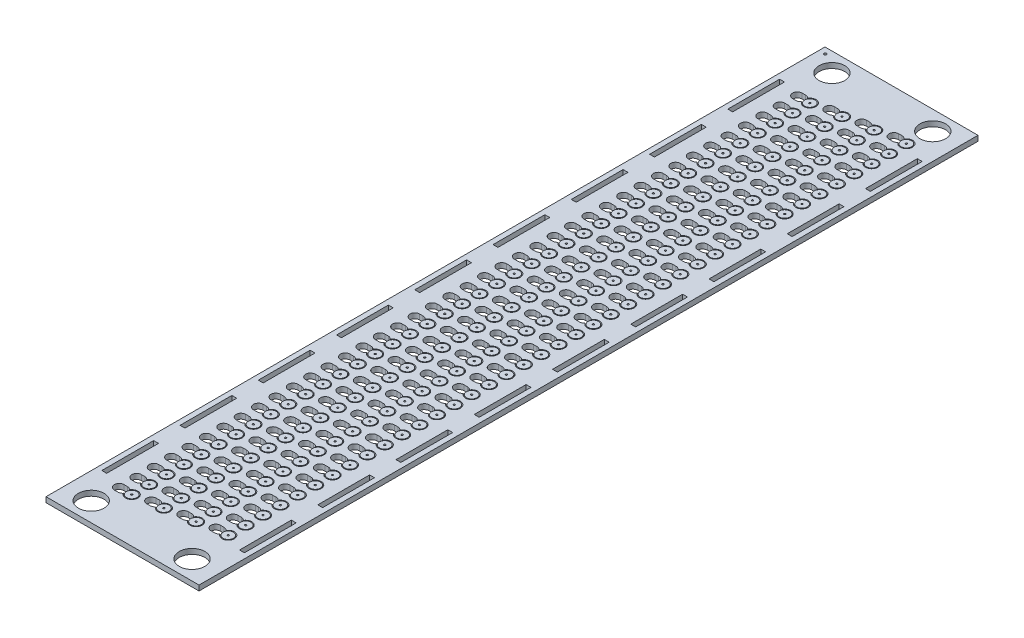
SolidWorks part; units mm, degrees
ref_plane "Alzado" through (0, 0, 0) normal (0, 0, 1) x (1, 0, 0)
ref_plane "Planta" through (0, 0, 0) normal (0, 1, 0) x (1, 0, 0)
ref_plane "Vista lateral" through (0, 0, 0) normal (1, 0, 0) x (0, 0, -1)
sketch "Croquis1" plane through (0, 0, 0) normal (0, 1, 0) x (1, 0, 0)
  line L0 (64.4, 425.95) -> (66.4, 425.95)
  line L1 (0, 0) -> (88, 0)
  line L2 (0, 0) -> (0, 448)
  line L3 (0, 448) -> (88, 448)
  line L4 (88, 0) -> (88, 448)
  line L5 (64.4, 420.45) -> (66.4, 420.45)
  line L6 (15, 444.4) -> (73, 444.4) construction
  line L15 (48.4, 423.45) -> (50.4, 423.45)
  line L16 (48.4, 417.95) -> (50.4, 417.95)
  line L17 (32.4, 420.95) -> (34.4, 420.95)
  line L18 (32.4, 415.45) -> (34.4, 415.45)
  line L19 (16.4, 418.45) -> (18.4, 418.45)
  line L20 (16.4, 412.95) -> (18.4, 412.95)
  line L28 (44, 448) -> (44, 0) construction
  line L105 (16.4, 408.45) -> (18.4, 408.45)
  line L106 (16.4, 402.95) -> (18.4, 402.95)
  line L107 (32.4, 410.95) -> (34.4, 410.95)
  line L108 (32.4, 405.45) -> (34.4, 405.45)
  line L109 (48.4, 413.45) -> (50.4, 413.45)
  line L110 (48.4, 407.95) -> (50.4, 407.95)
  line L111 (64.4, 410.45) -> (66.4, 410.45)
  line L112 (64.4, 415.95) -> (66.4, 415.95)
  line L113 (16.4, 398.45) -> (18.4, 398.45)
  line L114 (16.4, 392.95) -> (18.4, 392.95)
  line L115 (32.4, 400.95) -> (34.4, 400.95)
  line L116 (32.4, 395.45) -> (34.4, 395.45)
  line L117 (48.4, 403.45) -> (50.4, 403.45)
  line L118 (48.4, 397.95) -> (50.4, 397.95)
  line L119 (64.4, 400.45) -> (66.4, 400.45)
  line L120 (64.4, 405.95) -> (66.4, 405.95)
  line L121 (16.4, 388.45) -> (18.4, 388.45)
  line L122 (16.4, 382.95) -> (18.4, 382.95)
  line L123 (32.4, 390.95) -> (34.4, 390.95)
  line L124 (32.4, 385.45) -> (34.4, 385.45)
  line L125 (48.4, 393.45) -> (50.4, 393.45)
  line L126 (48.4, 387.95) -> (50.4, 387.95)
  line L127 (64.4, 390.45) -> (66.4, 390.45)
  line L128 (64.4, 395.95) -> (66.4, 395.95)
  line L129 (16.4, 378.45) -> (18.4, 378.45)
  line L130 (16.4, 372.95) -> (18.4, 372.95)
  line L131 (32.4, 380.95) -> (34.4, 380.95)
  line L132 (32.4, 375.45) -> (34.4, 375.45)
  line L133 (48.4, 383.45) -> (50.4, 383.45)
  line L134 (48.4, 377.95) -> (50.4, 377.95)
  line L135 (64.4, 380.45) -> (66.4, 380.45)
  line L136 (64.4, 385.95) -> (66.4, 385.95)
  line L137 (16.4, 368.45) -> (18.4, 368.45)
  line L138 (16.4, 362.95) -> (18.4, 362.95)
  line L139 (32.4, 370.95) -> (34.4, 370.95)
  line L140 (32.4, 365.45) -> (34.4, 365.45)
  line L141 (48.4, 373.45) -> (50.4, 373.45)
  line L142 (48.4, 367.95) -> (50.4, 367.95)
  line L143 (64.4, 370.45) -> (66.4, 370.45)
  line L144 (64.4, 375.95) -> (66.4, 375.95)
  line L145 (16.4, 358.45) -> (18.4, 358.45)
  line L146 (16.4, 352.95) -> (18.4, 352.95)
  line L147 (32.4, 360.95) -> (34.4, 360.95)
  line L148 (32.4, 355.45) -> (34.4, 355.45)
  line L149 (48.4, 363.45) -> (50.4, 363.45)
  line L150 (48.4, 357.95) -> (50.4, 357.95)
  line L151 (64.4, 360.45) -> (66.4, 360.45)
  line L152 (64.4, 365.95) -> (66.4, 365.95)
  line L153 (16.4, 348.45) -> (18.4, 348.45)
  line L154 (16.4, 342.95) -> (18.4, 342.95)
  line L155 (32.4, 350.95) -> (34.4, 350.95)
  line L156 (32.4, 345.45) -> (34.4, 345.45)
  line L157 (48.4, 353.45) -> (50.4, 353.45)
  line L158 (48.4, 347.95) -> (50.4, 347.95)
  line L159 (64.4, 350.45) -> (66.4, 350.45)
  line L160 (64.4, 355.95) -> (66.4, 355.95)
  line L161 (16.4, 338.45) -> (18.4, 338.45)
  line L162 (16.4, 332.95) -> (18.4, 332.95)
  line L163 (32.4, 340.95) -> (34.4, 340.95)
  line L164 (32.4, 335.45) -> (34.4, 335.45)
  line L165 (48.4, 343.45) -> (50.4, 343.45)
  line L166 (48.4, 337.95) -> (50.4, 337.95)
  line L167 (64.4, 340.45) -> (66.4, 340.45)
  line L168 (64.4, 345.95) -> (66.4, 345.95)
  line L169 (16.4, 328.45) -> (18.4, 328.45)
  line L170 (16.4, 322.95) -> (18.4, 322.95)
  line L171 (32.4, 330.95) -> (34.4, 330.95)
  line L172 (32.4, 325.45) -> (34.4, 325.45)
  line L173 (48.4, 333.45) -> (50.4, 333.45)
  line L174 (48.4, 327.95) -> (50.4, 327.95)
  line L175 (64.4, 330.45) -> (66.4, 330.45)
  line L176 (64.4, 335.95) -> (66.4, 335.95)
  line L177 (16.4, 318.45) -> (18.4, 318.45)
  line L178 (16.4, 312.95) -> (18.4, 312.95)
  line L179 (32.4, 320.95) -> (34.4, 320.95)
  line L180 (32.4, 315.45) -> (34.4, 315.45)
  line L181 (48.4, 323.45) -> (50.4, 323.45)
  line L182 (48.4, 317.95) -> (50.4, 317.95)
  line L183 (64.4, 320.45) -> (66.4, 320.45)
  line L184 (64.4, 325.95) -> (66.4, 325.95)
  line L185 (16.4, 308.45) -> (18.4, 308.45)
  line L186 (16.4, 302.95) -> (18.4, 302.95)
  line L187 (32.4, 310.95) -> (34.4, 310.95)
  line L188 (32.4, 305.45) -> (34.4, 305.45)
  line L189 (48.4, 313.45) -> (50.4, 313.45)
  line L190 (48.4, 307.95) -> (50.4, 307.95)
  line L191 (64.4, 310.45) -> (66.4, 310.45)
  line L192 (64.4, 315.95) -> (66.4, 315.95)
  line L193 (16.4, 298.45) -> (18.4, 298.45)
  line L194 (16.4, 292.95) -> (18.4, 292.95)
  line L195 (32.4, 300.95) -> (34.4, 300.95)
  line L196 (32.4, 295.45) -> (34.4, 295.45)
  line L197 (48.4, 303.45) -> (50.4, 303.45)
  line L198 (48.4, 297.95) -> (50.4, 297.95)
  line L199 (64.4, 300.45) -> (66.4, 300.45)
  line L200 (64.4, 305.95) -> (66.4, 305.95)
  line L201 (16.4, 288.45) -> (18.4, 288.45)
  line L202 (16.4, 282.95) -> (18.4, 282.95)
  line L203 (32.4, 290.95) -> (34.4, 290.95)
  line L204 (32.4, 285.45) -> (34.4, 285.45)
  line L205 (48.4, 293.45) -> (50.4, 293.45)
  line L206 (48.4, 287.95) -> (50.4, 287.95)
  line L207 (64.4, 290.45) -> (66.4, 290.45)
  line L208 (64.4, 295.95) -> (66.4, 295.95)
  line L209 (16.4, 278.45) -> (18.4, 278.45)
  line L210 (16.4, 272.95) -> (18.4, 272.95)
  line L211 (32.4, 280.95) -> (34.4, 280.95)
  line L212 (32.4, 275.45) -> (34.4, 275.45)
  line L213 (48.4, 283.45) -> (50.4, 283.45)
  line L214 (48.4, 277.95) -> (50.4, 277.95)
  line L215 (64.4, 280.45) -> (66.4, 280.45)
  line L216 (64.4, 285.95) -> (66.4, 285.95)
  line L217 (16.4, 268.45) -> (18.4, 268.45)
  line L218 (16.4, 262.95) -> (18.4, 262.95)
  line L219 (32.4, 270.95) -> (34.4, 270.95)
  line L220 (32.4, 265.45) -> (34.4, 265.45)
  line L221 (48.4, 273.45) -> (50.4, 273.45)
  line L222 (48.4, 267.95) -> (50.4, 267.95)
  line L223 (64.4, 270.45) -> (66.4, 270.45)
  line L224 (64.4, 275.95) -> (66.4, 275.95)
  line L225 (16.4, 258.45) -> (18.4, 258.45)
  line L226 (16.4, 252.95) -> (18.4, 252.95)
  line L227 (32.4, 260.95) -> (34.4, 260.95)
  line L228 (32.4, 255.45) -> (34.4, 255.45)
  line L229 (48.4, 263.45) -> (50.4, 263.45)
  line L230 (48.4, 257.95) -> (50.4, 257.95)
  line L231 (64.4, 260.45) -> (66.4, 260.45)
  line L232 (64.4, 265.95) -> (66.4, 265.95)
  line L233 (16.4, 248.45) -> (18.4, 248.45)
  line L234 (16.4, 242.95) -> (18.4, 242.95)
  line L235 (32.4, 250.95) -> (34.4, 250.95)
  line L236 (32.4, 245.45) -> (34.4, 245.45)
  line L237 (48.4, 253.45) -> (50.4, 253.45)
  line L238 (48.4, 247.95) -> (50.4, 247.95)
  line L239 (64.4, 250.45) -> (66.4, 250.45)
  line L240 (64.4, 255.95) -> (66.4, 255.95)
  line L241 (16.4, 238.45) -> (18.4, 238.45)
  line L242 (16.4, 232.95) -> (18.4, 232.95)
  line L243 (32.4, 240.95) -> (34.4, 240.95)
  line L244 (32.4, 235.45) -> (34.4, 235.45)
  line L245 (48.4, 243.45) -> (50.4, 243.45)
  line L246 (48.4, 237.95) -> (50.4, 237.95)
  line L247 (64.4, 240.45) -> (66.4, 240.45)
  line L248 (64.4, 245.95) -> (66.4, 245.95)
  line L249 (16.4, 228.45) -> (18.4, 228.45)
  line L250 (16.4, 222.95) -> (18.4, 222.95)
  line L251 (32.4, 230.95) -> (34.4, 230.95)
  line L252 (32.4, 225.45) -> (34.4, 225.45)
  line L253 (48.4, 233.45) -> (50.4, 233.45)
  line L254 (48.4, 227.95) -> (50.4, 227.95)
  line L255 (64.4, 230.45) -> (66.4, 230.45)
  line L256 (64.4, 235.95) -> (66.4, 235.95)
  line L257 (16.4, 218.45) -> (18.4, 218.45)
  line L258 (16.4, 212.95) -> (18.4, 212.95)
  line L259 (32.4, 220.95) -> (34.4, 220.95)
  line L260 (32.4, 215.45) -> (34.4, 215.45)
  line L261 (48.4, 223.45) -> (50.4, 223.45)
  line L262 (48.4, 217.95) -> (50.4, 217.95)
  line L263 (64.4, 220.45) -> (66.4, 220.45)
  line L264 (64.4, 225.95) -> (66.4, 225.95)
  line L265 (16.4, 208.45) -> (18.4, 208.45)
  line L266 (16.4, 202.95) -> (18.4, 202.95)
  line L267 (32.4, 210.95) -> (34.4, 210.95)
  line L268 (32.4, 205.45) -> (34.4, 205.45)
  line L269 (48.4, 213.45) -> (50.4, 213.45)
  line L270 (48.4, 207.95) -> (50.4, 207.95)
  line L271 (64.4, 210.45) -> (66.4, 210.45)
  line L272 (64.4, 215.95) -> (66.4, 215.95)
  line L273 (16.4, 198.45) -> (18.4, 198.45)
  line L274 (16.4, 192.95) -> (18.4, 192.95)
  line L275 (32.4, 200.95) -> (34.4, 200.95)
  line L276 (32.4, 195.45) -> (34.4, 195.45)
  line L277 (48.4, 203.45) -> (50.4, 203.45)
  line L278 (48.4, 197.95) -> (50.4, 197.95)
  line L279 (64.4, 200.45) -> (66.4, 200.45)
  line L280 (64.4, 205.95) -> (66.4, 205.95)
  line L281 (16.4, 188.45) -> (18.4, 188.45)
  line L282 (16.4, 182.95) -> (18.4, 182.95)
  line L283 (32.4, 190.95) -> (34.4, 190.95)
  line L284 (32.4, 185.45) -> (34.4, 185.45)
  line L285 (48.4, 193.45) -> (50.4, 193.45)
  line L286 (48.4, 187.95) -> (50.4, 187.95)
  line L287 (64.4, 190.45) -> (66.4, 190.45)
  line L288 (64.4, 195.95) -> (66.4, 195.95)
  line L289 (16.4, 178.45) -> (18.4, 178.45)
  line L290 (16.4, 172.95) -> (18.4, 172.95)
  line L291 (32.4, 180.95) -> (34.4, 180.95)
  line L292 (32.4, 175.45) -> (34.4, 175.45)
  line L293 (48.4, 183.45) -> (50.4, 183.45)
  line L294 (48.4, 177.95) -> (50.4, 177.95)
  line L295 (64.4, 180.45) -> (66.4, 180.45)
  line L296 (64.4, 185.95) -> (66.4, 185.95)
  line L297 (16.4, 168.45) -> (18.4, 168.45)
  line L298 (16.4, 162.95) -> (18.4, 162.95)
  line L299 (32.4, 170.95) -> (34.4, 170.95)
  line L300 (32.4, 165.45) -> (34.4, 165.45)
  line L301 (48.4, 173.45) -> (50.4, 173.45)
  line L302 (48.4, 167.95) -> (50.4, 167.95)
  line L303 (64.4, 170.45) -> (66.4, 170.45)
  line L304 (64.4, 175.95) -> (66.4, 175.95)
  line L305 (16.4, 158.45) -> (18.4, 158.45)
  line L306 (16.4, 152.95) -> (18.4, 152.95)
  line L307 (32.4, 160.95) -> (34.4, 160.95)
  line L308 (32.4, 155.45) -> (34.4, 155.45)
  line L309 (48.4, 163.45) -> (50.4, 163.45)
  line L310 (48.4, 157.95) -> (50.4, 157.95)
  line L311 (64.4, 160.45) -> (66.4, 160.45)
  line L312 (64.4, 165.95) -> (66.4, 165.95)
  line L313 (16.4, 148.45) -> (18.4, 148.45)
  line L314 (16.4, 142.95) -> (18.4, 142.95)
  line L315 (32.4, 150.95) -> (34.4, 150.95)
  line L316 (32.4, 145.45) -> (34.4, 145.45)
  line L317 (48.4, 153.45) -> (50.4, 153.45)
  line L318 (48.4, 147.95) -> (50.4, 147.95)
  line L319 (64.4, 150.45) -> (66.4, 150.45)
  line L320 (64.4, 155.95) -> (66.4, 155.95)
  line L321 (16.4, 138.45) -> (18.4, 138.45)
  line L322 (16.4, 132.95) -> (18.4, 132.95)
  line L323 (32.4, 140.95) -> (34.4, 140.95)
  line L324 (32.4, 135.45) -> (34.4, 135.45)
  line L325 (48.4, 143.45) -> (50.4, 143.45)
  line L326 (48.4, 137.95) -> (50.4, 137.95)
  line L327 (64.4, 140.45) -> (66.4, 140.45)
  line L328 (64.4, 145.95) -> (66.4, 145.95)
  line L329 (16.4, 128.45) -> (18.4, 128.45)
  line L330 (16.4, 122.95) -> (18.4, 122.95)
  line L331 (32.4, 130.95) -> (34.4, 130.95)
  line L332 (32.4, 125.45) -> (34.4, 125.45)
  line L333 (48.4, 133.45) -> (50.4, 133.45)
  line L334 (48.4, 127.95) -> (50.4, 127.95)
  line L335 (64.4, 130.45) -> (66.4, 130.45)
  line L336 (64.4, 135.95) -> (66.4, 135.95)
  line L337 (16.4, 118.45) -> (18.4, 118.45)
  line L338 (16.4, 112.95) -> (18.4, 112.95)
  line L339 (32.4, 120.95) -> (34.4, 120.95)
  line L340 (32.4, 115.45) -> (34.4, 115.45)
  line L341 (48.4, 123.45) -> (50.4, 123.45)
  line L342 (48.4, 117.95) -> (50.4, 117.95)
  line L343 (64.4, 120.45) -> (66.4, 120.45)
  line L344 (64.4, 125.95) -> (66.4, 125.95)
  line L345 (16.4, 108.45) -> (18.4, 108.45)
  line L346 (16.4, 102.95) -> (18.4, 102.95)
  line L347 (32.4, 110.95) -> (34.4, 110.95)
  line L348 (32.4, 105.45) -> (34.4, 105.45)
  line L349 (48.4, 113.45) -> (50.4, 113.45)
  line L350 (48.4, 107.95) -> (50.4, 107.95)
  line L351 (64.4, 110.45) -> (66.4, 110.45)
  line L352 (64.4, 115.95) -> (66.4, 115.95)
  line L353 (16.4, 98.45) -> (18.4, 98.45)
  line L354 (16.4, 92.95) -> (18.4, 92.95)
  line L355 (32.4, 100.95) -> (34.4, 100.95)
  line L356 (32.4, 95.45) -> (34.4, 95.45)
  line L357 (48.4, 103.45) -> (50.4, 103.45)
  line L358 (48.4, 97.95) -> (50.4, 97.95)
  line L359 (64.4, 100.45) -> (66.4, 100.45)
  line L360 (64.4, 105.95) -> (66.4, 105.95)
  line L361 (16.4, 88.45) -> (18.4, 88.45)
  line L362 (16.4, 82.95) -> (18.4, 82.95)
  line L363 (32.4, 90.95) -> (34.4, 90.95)
  line L364 (32.4, 85.45) -> (34.4, 85.45)
  line L365 (48.4, 93.45) -> (50.4, 93.45)
  line L366 (48.4, 87.95) -> (50.4, 87.95)
  line L367 (64.4, 90.45) -> (66.4, 90.45)
  line L368 (64.4, 95.95) -> (66.4, 95.95)
  line L369 (16.4, 78.45) -> (18.4, 78.45)
  line L370 (16.4, 72.95) -> (18.4, 72.95)
  line L371 (32.4, 80.95) -> (34.4, 80.95)
  line L372 (32.4, 75.45) -> (34.4, 75.45)
  line L373 (48.4, 83.45) -> (50.4, 83.45)
  line L374 (48.4, 77.95) -> (50.4, 77.95)
  line L375 (64.4, 80.45) -> (66.4, 80.45)
  line L376 (64.4, 85.95) -> (66.4, 85.95)
  line L377 (16.4, 68.45) -> (18.4, 68.45)
  line L378 (16.4, 62.95) -> (18.4, 62.95)
  line L379 (32.4, 70.95) -> (34.4, 70.95)
  line L380 (32.4, 65.45) -> (34.4, 65.45)
  line L381 (48.4, 73.45) -> (50.4, 73.45)
  line L382 (48.4, 67.95) -> (50.4, 67.95)
  line L383 (64.4, 70.45) -> (66.4, 70.45)
  line L384 (64.4, 75.95) -> (66.4, 75.95)
  line L385 (16.4, 58.45) -> (18.4, 58.45)
  line L386 (16.4, 52.95) -> (18.4, 52.95)
  line L387 (32.4, 60.95) -> (34.4, 60.95)
  line L388 (32.4, 55.45) -> (34.4, 55.45)
  line L389 (48.4, 63.45) -> (50.4, 63.45)
  line L390 (48.4, 57.95) -> (50.4, 57.95)
  line L391 (64.4, 60.45) -> (66.4, 60.45)
  line L392 (64.4, 65.95) -> (66.4, 65.95)
  line L393 (16.4, 48.45) -> (18.4, 48.45)
  line L394 (16.4, 42.95) -> (18.4, 42.95)
  line L395 (32.4, 50.95) -> (34.4, 50.95)
  line L396 (32.4, 45.45) -> (34.4, 45.45)
  line L397 (48.4, 53.45) -> (50.4, 53.45)
  line L398 (48.4, 47.95) -> (50.4, 47.95)
  line L399 (64.4, 50.45) -> (66.4, 50.45)
  line L400 (64.4, 55.95) -> (66.4, 55.95)
  line L401 (16.4, 38.45) -> (18.4, 38.45)
  line L402 (16.4, 32.95) -> (18.4, 32.95)
  line L403 (32.4, 40.95) -> (34.4, 40.95)
  line L404 (32.4, 35.45) -> (34.4, 35.45)
  line L405 (48.4, 43.45) -> (50.4, 43.45)
  line L406 (48.4, 37.95) -> (50.4, 37.95)
  line L407 (64.4, 40.45) -> (66.4, 40.45)
  line L408 (64.4, 45.95) -> (66.4, 45.95)
  line L409 (16.4, 28.45) -> (18.4, 28.45)
  line L410 (16.4, 22.95) -> (18.4, 22.95)
  line L411 (32.4, 30.95) -> (34.4, 30.95)
  line L412 (32.4, 25.45) -> (34.4, 25.45)
  line L413 (48.4, 33.45) -> (50.4, 33.45)
  line L414 (48.4, 27.95) -> (50.4, 27.95)
  line L415 (64.4, 30.45) -> (66.4, 30.45)
  line L416 (64.4, 35.95) -> (66.4, 35.95)
  circle A0 centre (15, 437) radius 7.4
  circle A1 centre (73, 437) radius 7.4
  arc A2 (68.5493, 421.4845) -> (68.5493, 424.9155) centre (71.6, 423.2) ccw
  circle A3 centre (71.6, 423.2) radius 3
  circle A4 centre (71.6, 423.2) radius 0.5
  arc A5 (64.4, 425.95) -> (64.4, 420.45) centre (64.4, 423.2) ccw
  arc A6 (66.4, 420.45) -> (68.5493, 421.4845) centre (66.4, 423.2) ccw
  arc A7 (68.5493, 424.9155) -> (66.4, 425.95) centre (66.4, 423.2) ccw
  circle A8 centre (15, 11) radius 7.4
  circle A9 centre (73, 11) radius 7.4
  circle A10 centre (55.6, 420.7) radius 3
  arc A11 (50.4, 417.95) -> (52.5493, 418.9845) centre (50.4, 420.7) ccw
  arc A12 (48.4, 423.45) -> (48.4, 417.95) centre (48.4, 420.7) ccw
  arc A13 (52.5493, 422.4155) -> (50.4, 423.45) centre (50.4, 420.7) ccw
  arc A14 (52.5493, 418.9845) -> (52.5493, 422.4155) centre (55.6, 420.7) ccw
  circle A15 centre (55.6, 420.7) radius 0.5
  circle A16 centre (39.6, 418.2) radius 3
  arc A17 (34.4, 415.45) -> (36.5493, 416.4845) centre (34.4, 418.2) ccw
  arc A18 (32.4, 420.95) -> (32.4, 415.45) centre (32.4, 418.2) ccw
  arc A19 (36.5493, 419.9155) -> (34.4, 420.95) centre (34.4, 418.2) ccw
  arc A20 (36.5493, 416.4845) -> (36.5493, 419.9155) centre (39.6, 418.2) ccw
  circle A21 centre (39.6, 418.2) radius 0.5
  circle A22 centre (23.6, 415.7) radius 3
  arc A23 (18.4, 412.95) -> (20.5493, 413.9845) centre (18.4, 415.7) ccw
  arc A24 (16.4, 418.45) -> (16.4, 412.95) centre (16.4, 415.7) ccw
  arc A25 (20.5493, 417.4155) -> (18.4, 418.45) centre (18.4, 415.7) ccw
  arc A26 (20.5493, 413.9845) -> (20.5493, 417.4155) centre (23.6, 415.7) ccw
  circle A27 centre (23.6, 415.7) radius 0.5
  arc A28 (16.4, 408.45) -> (16.4, 402.95) centre (16.4, 405.7) ccw
  arc A29 (20.5493, 407.4155) -> (18.4, 408.45) centre (18.4, 405.7) ccw
  arc A30 (18.4, 402.95) -> (20.5493, 403.9845) centre (18.4, 405.7) ccw
  circle A31 centre (23.6, 405.7) radius 3
  circle A32 centre (23.6, 405.7) radius 0.5
  arc A33 (20.5493, 403.9845) -> (20.5493, 407.4155) centre (23.6, 405.7) ccw
  arc A34 (32.4, 410.95) -> (32.4, 405.45) centre (32.4, 408.2) ccw
  arc A35 (36.5493, 409.9155) -> (34.4, 410.95) centre (34.4, 408.2) ccw
  arc A36 (34.4, 405.45) -> (36.5493, 406.4845) centre (34.4, 408.2) ccw
  arc A37 (36.5493, 406.4845) -> (36.5493, 409.9155) centre (39.6, 408.2) ccw
  circle A38 centre (39.6, 408.2) radius 3
  circle A39 centre (39.6, 408.2) radius 0.5
  arc A40 (48.4, 413.45) -> (48.4, 407.95) centre (48.4, 410.7) ccw
  arc A41 (52.5493, 412.4155) -> (50.4, 413.45) centre (50.4, 410.7) ccw
  arc A42 (50.4, 407.95) -> (52.5493, 408.9845) centre (50.4, 410.7) ccw
  arc A43 (52.5493, 408.9845) -> (52.5493, 412.4155) centre (55.6, 410.7) ccw
  circle A44 centre (55.6, 410.7) radius 3
  circle A45 centre (55.6, 410.7) radius 0.5
  arc A46 (64.4, 415.95) -> (64.4, 410.45) centre (64.4, 413.2) ccw
  arc A47 (66.4, 410.45) -> (68.5493, 411.4845) centre (66.4, 413.2) ccw
  arc A48 (68.5493, 414.9155) -> (66.4, 415.95) centre (66.4, 413.2) ccw
  arc A49 (68.5493, 411.4845) -> (68.5493, 414.9155) centre (71.6, 413.2) ccw
  circle A50 centre (71.6, 413.2) radius 3
  circle A51 centre (71.6, 413.2) radius 0.5
  arc A52 (16.4, 398.45) -> (16.4, 392.95) centre (16.4, 395.7) ccw
  arc A53 (20.5493, 397.4155) -> (18.4, 398.45) centre (18.4, 395.7) ccw
  arc A54 (18.4, 392.95) -> (20.5493, 393.9845) centre (18.4, 395.7) ccw
  circle A55 centre (23.6, 395.7) radius 3
  circle A56 centre (23.6, 395.7) radius 0.5
  arc A57 (20.5493, 393.9845) -> (20.5493, 397.4155) centre (23.6, 395.7) ccw
  arc A58 (32.4, 400.95) -> (32.4, 395.45) centre (32.4, 398.2) ccw
  arc A59 (36.5493, 399.9155) -> (34.4, 400.95) centre (34.4, 398.2) ccw
  arc A60 (34.4, 395.45) -> (36.5493, 396.4845) centre (34.4, 398.2) ccw
  arc A61 (36.5493, 396.4845) -> (36.5493, 399.9155) centre (39.6, 398.2) ccw
  circle A62 centre (39.6, 398.2) radius 3
  circle A63 centre (39.6, 398.2) radius 0.5
  arc A64 (48.4, 403.45) -> (48.4, 397.95) centre (48.4, 400.7) ccw
  arc A65 (52.5493, 402.4155) -> (50.4, 403.45) centre (50.4, 400.7) ccw
  arc A66 (50.4, 397.95) -> (52.5493, 398.9845) centre (50.4, 400.7) ccw
  arc A67 (52.5493, 398.9845) -> (52.5493, 402.4155) centre (55.6, 400.7) ccw
  circle A68 centre (55.6, 400.7) radius 3
  circle A69 centre (55.6, 400.7) radius 0.5
  arc A70 (64.4, 405.95) -> (64.4, 400.45) centre (64.4, 403.2) ccw
  arc A71 (66.4, 400.45) -> (68.5493, 401.4845) centre (66.4, 403.2) ccw
  arc A72 (68.5493, 404.9155) -> (66.4, 405.95) centre (66.4, 403.2) ccw
  arc A73 (68.5493, 401.4845) -> (68.5493, 404.9155) centre (71.6, 403.2) ccw
  circle A74 centre (71.6, 403.2) radius 3
  circle A75 centre (71.6, 403.2) radius 0.5
  arc A76 (16.4, 388.45) -> (16.4, 382.95) centre (16.4, 385.7) ccw
  arc A77 (20.5493, 387.4155) -> (18.4, 388.45) centre (18.4, 385.7) ccw
  arc A78 (18.4, 382.95) -> (20.5493, 383.9845) centre (18.4, 385.7) ccw
  circle A79 centre (23.6, 385.7) radius 3
  circle A80 centre (23.6, 385.7) radius 0.5
  arc A81 (20.5493, 383.9845) -> (20.5493, 387.4155) centre (23.6, 385.7) ccw
  arc A82 (32.4, 390.95) -> (32.4, 385.45) centre (32.4, 388.2) ccw
  arc A83 (36.5493, 389.9155) -> (34.4, 390.95) centre (34.4, 388.2) ccw
  arc A84 (34.4, 385.45) -> (36.5493, 386.4845) centre (34.4, 388.2) ccw
  arc A85 (36.5493, 386.4845) -> (36.5493, 389.9155) centre (39.6, 388.2) ccw
  circle A86 centre (39.6, 388.2) radius 3
  circle A87 centre (39.6, 388.2) radius 0.5
  arc A88 (48.4, 393.45) -> (48.4, 387.95) centre (48.4, 390.7) ccw
  arc A89 (52.5493, 392.4155) -> (50.4, 393.45) centre (50.4, 390.7) ccw
  arc A90 (50.4, 387.95) -> (52.5493, 388.9845) centre (50.4, 390.7) ccw
  arc A91 (52.5493, 388.9845) -> (52.5493, 392.4155) centre (55.6, 390.7) ccw
  circle A92 centre (55.6, 390.7) radius 3
  circle A93 centre (55.6, 390.7) radius 0.5
  arc A94 (64.4, 395.95) -> (64.4, 390.45) centre (64.4, 393.2) ccw
  arc A95 (66.4, 390.45) -> (68.5493, 391.4845) centre (66.4, 393.2) ccw
  arc A96 (68.5493, 394.9155) -> (66.4, 395.95) centre (66.4, 393.2) ccw
  arc A97 (68.5493, 391.4845) -> (68.5493, 394.9155) centre (71.6, 393.2) ccw
  circle A98 centre (71.6, 393.2) radius 3
  circle A99 centre (71.6, 393.2) radius 0.5
  arc A100 (16.4, 378.45) -> (16.4, 372.95) centre (16.4, 375.7) ccw
  arc A101 (20.5493, 377.4155) -> (18.4, 378.45) centre (18.4, 375.7) ccw
  arc A102 (18.4, 372.95) -> (20.5493, 373.9845) centre (18.4, 375.7) ccw
  circle A103 centre (23.6, 375.7) radius 3
  circle A104 centre (23.6, 375.7) radius 0.5
  arc A105 (20.5493, 373.9845) -> (20.5493, 377.4155) centre (23.6, 375.7) ccw
  arc A106 (32.4, 380.95) -> (32.4, 375.45) centre (32.4, 378.2) ccw
  arc A107 (36.5493, 379.9155) -> (34.4, 380.95) centre (34.4, 378.2) ccw
  arc A108 (34.4, 375.45) -> (36.5493, 376.4845) centre (34.4, 378.2) ccw
  arc A109 (36.5493, 376.4845) -> (36.5493, 379.9155) centre (39.6, 378.2) ccw
  circle A110 centre (39.6, 378.2) radius 3
  circle A111 centre (39.6, 378.2) radius 0.5
  arc A112 (48.4, 383.45) -> (48.4, 377.95) centre (48.4, 380.7) ccw
  arc A113 (52.5493, 382.4155) -> (50.4, 383.45) centre (50.4, 380.7) ccw
  arc A114 (50.4, 377.95) -> (52.5493, 378.9845) centre (50.4, 380.7) ccw
  arc A115 (52.5493, 378.9845) -> (52.5493, 382.4155) centre (55.6, 380.7) ccw
  circle A116 centre (55.6, 380.7) radius 3
  circle A117 centre (55.6, 380.7) radius 0.5
  arc A118 (64.4, 385.95) -> (64.4, 380.45) centre (64.4, 383.2) ccw
  arc A119 (66.4, 380.45) -> (68.5493, 381.4845) centre (66.4, 383.2) ccw
  arc A120 (68.5493, 384.9155) -> (66.4, 385.95) centre (66.4, 383.2) ccw
  arc A121 (68.5493, 381.4845) -> (68.5493, 384.9155) centre (71.6, 383.2) ccw
  circle A122 centre (71.6, 383.2) radius 3
  circle A123 centre (71.6, 383.2) radius 0.5
  arc A124 (16.4, 368.45) -> (16.4, 362.95) centre (16.4, 365.7) ccw
  arc A125 (20.5493, 367.4155) -> (18.4, 368.45) centre (18.4, 365.7) ccw
  arc A126 (18.4, 362.95) -> (20.5493, 363.9845) centre (18.4, 365.7) ccw
  circle A127 centre (23.6, 365.7) radius 3
  circle A128 centre (23.6, 365.7) radius 0.5
  arc A129 (20.5493, 363.9845) -> (20.5493, 367.4155) centre (23.6, 365.7) ccw
  arc A130 (32.4, 370.95) -> (32.4, 365.45) centre (32.4, 368.2) ccw
  arc A131 (36.5493, 369.9155) -> (34.4, 370.95) centre (34.4, 368.2) ccw
  arc A132 (34.4, 365.45) -> (36.5493, 366.4845) centre (34.4, 368.2) ccw
  arc A133 (36.5493, 366.4845) -> (36.5493, 369.9155) centre (39.6, 368.2) ccw
  circle A134 centre (39.6, 368.2) radius 3
  circle A135 centre (39.6, 368.2) radius 0.5
  arc A136 (48.4, 373.45) -> (48.4, 367.95) centre (48.4, 370.7) ccw
  arc A137 (52.5493, 372.4155) -> (50.4, 373.45) centre (50.4, 370.7) ccw
  arc A138 (50.4, 367.95) -> (52.5493, 368.9845) centre (50.4, 370.7) ccw
  arc A139 (52.5493, 368.9845) -> (52.5493, 372.4155) centre (55.6, 370.7) ccw
  circle A140 centre (55.6, 370.7) radius 3
  circle A141 centre (55.6, 370.7) radius 0.5
  arc A142 (64.4, 375.95) -> (64.4, 370.45) centre (64.4, 373.2) ccw
  arc A143 (66.4, 370.45) -> (68.5493, 371.4845) centre (66.4, 373.2) ccw
  arc A144 (68.5493, 374.9155) -> (66.4, 375.95) centre (66.4, 373.2) ccw
  arc A145 (68.5493, 371.4845) -> (68.5493, 374.9155) centre (71.6, 373.2) ccw
  circle A146 centre (71.6, 373.2) radius 3
  circle A147 centre (71.6, 373.2) radius 0.5
  arc A148 (16.4, 358.45) -> (16.4, 352.95) centre (16.4, 355.7) ccw
  arc A149 (20.5493, 357.4155) -> (18.4, 358.45) centre (18.4, 355.7) ccw
  arc A150 (18.4, 352.95) -> (20.5493, 353.9845) centre (18.4, 355.7) ccw
  circle A151 centre (23.6, 355.7) radius 3
  circle A152 centre (23.6, 355.7) radius 0.5
  arc A153 (20.5493, 353.9845) -> (20.5493, 357.4155) centre (23.6, 355.7) ccw
  arc A154 (32.4, 360.95) -> (32.4, 355.45) centre (32.4, 358.2) ccw
  arc A155 (36.5493, 359.9155) -> (34.4, 360.95) centre (34.4, 358.2) ccw
  arc A156 (34.4, 355.45) -> (36.5493, 356.4845) centre (34.4, 358.2) ccw
  arc A157 (36.5493, 356.4845) -> (36.5493, 359.9155) centre (39.6, 358.2) ccw
  circle A158 centre (39.6, 358.2) radius 3
  circle A159 centre (39.6, 358.2) radius 0.5
  arc A160 (48.4, 363.45) -> (48.4, 357.95) centre (48.4, 360.7) ccw
  arc A161 (52.5493, 362.4155) -> (50.4, 363.45) centre (50.4, 360.7) ccw
  arc A162 (50.4, 357.95) -> (52.5493, 358.9845) centre (50.4, 360.7) ccw
  arc A163 (52.5493, 358.9845) -> (52.5493, 362.4155) centre (55.6, 360.7) ccw
  circle A164 centre (55.6, 360.7) radius 3
  circle A165 centre (55.6, 360.7) radius 0.5
  arc A166 (64.4, 365.95) -> (64.4, 360.45) centre (64.4, 363.2) ccw
  arc A167 (66.4, 360.45) -> (68.5493, 361.4845) centre (66.4, 363.2) ccw
  arc A168 (68.5493, 364.9155) -> (66.4, 365.95) centre (66.4, 363.2) ccw
  arc A169 (68.5493, 361.4845) -> (68.5493, 364.9155) centre (71.6, 363.2) ccw
  circle A170 centre (71.6, 363.2) radius 3
  circle A171 centre (71.6, 363.2) radius 0.5
  arc A172 (16.4, 348.45) -> (16.4, 342.95) centre (16.4, 345.7) ccw
  arc A173 (20.5493, 347.4155) -> (18.4, 348.45) centre (18.4, 345.7) ccw
  arc A174 (18.4, 342.95) -> (20.5493, 343.9845) centre (18.4, 345.7) ccw
  circle A175 centre (23.6, 345.7) radius 3
  circle A176 centre (23.6, 345.7) radius 0.5
  arc A177 (20.5493, 343.9845) -> (20.5493, 347.4155) centre (23.6, 345.7) ccw
  arc A178 (32.4, 350.95) -> (32.4, 345.45) centre (32.4, 348.2) ccw
  arc A179 (36.5493, 349.9155) -> (34.4, 350.95) centre (34.4, 348.2) ccw
  arc A180 (34.4, 345.45) -> (36.5493, 346.4845) centre (34.4, 348.2) ccw
  arc A181 (36.5493, 346.4845) -> (36.5493, 349.9155) centre (39.6, 348.2) ccw
  circle A182 centre (39.6, 348.2) radius 3
  circle A183 centre (39.6, 348.2) radius 0.5
  arc A184 (48.4, 353.45) -> (48.4, 347.95) centre (48.4, 350.7) ccw
  arc A185 (52.5493, 352.4155) -> (50.4, 353.45) centre (50.4, 350.7) ccw
  arc A186 (50.4, 347.95) -> (52.5493, 348.9845) centre (50.4, 350.7) ccw
  arc A187 (52.5493, 348.9845) -> (52.5493, 352.4155) centre (55.6, 350.7) ccw
  circle A188 centre (55.6, 350.7) radius 3
  circle A189 centre (55.6, 350.7) radius 0.5
  arc A190 (64.4, 355.95) -> (64.4, 350.45) centre (64.4, 353.2) ccw
  arc A191 (66.4, 350.45) -> (68.5493, 351.4845) centre (66.4, 353.2) ccw
  arc A192 (68.5493, 354.9155) -> (66.4, 355.95) centre (66.4, 353.2) ccw
  arc A193 (68.5493, 351.4845) -> (68.5493, 354.9155) centre (71.6, 353.2) ccw
  circle A194 centre (71.6, 353.2) radius 3
  circle A195 centre (71.6, 353.2) radius 0.5
  arc A196 (16.4, 338.45) -> (16.4, 332.95) centre (16.4, 335.7) ccw
  arc A197 (20.5493, 337.4155) -> (18.4, 338.45) centre (18.4, 335.7) ccw
  arc A198 (18.4, 332.95) -> (20.5493, 333.9845) centre (18.4, 335.7) ccw
  circle A199 centre (23.6, 335.7) radius 3
  circle A200 centre (23.6, 335.7) radius 0.5
  arc A201 (20.5493, 333.9845) -> (20.5493, 337.4155) centre (23.6, 335.7) ccw
  arc A202 (32.4, 340.95) -> (32.4, 335.45) centre (32.4, 338.2) ccw
  arc A203 (36.5493, 339.9155) -> (34.4, 340.95) centre (34.4, 338.2) ccw
  arc A204 (34.4, 335.45) -> (36.5493, 336.4845) centre (34.4, 338.2) ccw
  arc A205 (36.5493, 336.4845) -> (36.5493, 339.9155) centre (39.6, 338.2) ccw
  circle A206 centre (39.6, 338.2) radius 3
  circle A207 centre (39.6, 338.2) radius 0.5
  arc A208 (48.4, 343.45) -> (48.4, 337.95) centre (48.4, 340.7) ccw
  arc A209 (52.5493, 342.4155) -> (50.4, 343.45) centre (50.4, 340.7) ccw
  arc A210 (50.4, 337.95) -> (52.5493, 338.9845) centre (50.4, 340.7) ccw
  arc A211 (52.5493, 338.9845) -> (52.5493, 342.4155) centre (55.6, 340.7) ccw
  circle A212 centre (55.6, 340.7) radius 3
  circle A213 centre (55.6, 340.7) radius 0.5
  arc A214 (64.4, 345.95) -> (64.4, 340.45) centre (64.4, 343.2) ccw
  arc A215 (66.4, 340.45) -> (68.5493, 341.4845) centre (66.4, 343.2) ccw
  arc A216 (68.5493, 344.9155) -> (66.4, 345.95) centre (66.4, 343.2) ccw
  arc A217 (68.5493, 341.4845) -> (68.5493, 344.9155) centre (71.6, 343.2) ccw
  circle A218 centre (71.6, 343.2) radius 3
  circle A219 centre (71.6, 343.2) radius 0.5
  arc A220 (16.4, 328.45) -> (16.4, 322.95) centre (16.4, 325.7) ccw
  arc A221 (20.5493, 327.4155) -> (18.4, 328.45) centre (18.4, 325.7) ccw
  arc A222 (18.4, 322.95) -> (20.5493, 323.9845) centre (18.4, 325.7) ccw
  circle A223 centre (23.6, 325.7) radius 3
  circle A224 centre (23.6, 325.7) radius 0.5
  arc A225 (20.5493, 323.9845) -> (20.5493, 327.4155) centre (23.6, 325.7) ccw
  arc A226 (32.4, 330.95) -> (32.4, 325.45) centre (32.4, 328.2) ccw
  arc A227 (36.5493, 329.9155) -> (34.4, 330.95) centre (34.4, 328.2) ccw
  arc A228 (34.4, 325.45) -> (36.5493, 326.4845) centre (34.4, 328.2) ccw
  arc A229 (36.5493, 326.4845) -> (36.5493, 329.9155) centre (39.6, 328.2) ccw
  circle A230 centre (39.6, 328.2) radius 3
  circle A231 centre (39.6, 328.2) radius 0.5
  arc A232 (48.4, 333.45) -> (48.4, 327.95) centre (48.4, 330.7) ccw
  arc A233 (52.5493, 332.4155) -> (50.4, 333.45) centre (50.4, 330.7) ccw
  arc A234 (50.4, 327.95) -> (52.5493, 328.9845) centre (50.4, 330.7) ccw
  arc A235 (52.5493, 328.9845) -> (52.5493, 332.4155) centre (55.6, 330.7) ccw
  circle A236 centre (55.6, 330.7) radius 3
  circle A237 centre (55.6, 330.7) radius 0.5
  arc A238 (64.4, 335.95) -> (64.4, 330.45) centre (64.4, 333.2) ccw
  arc A239 (66.4, 330.45) -> (68.5493, 331.4845) centre (66.4, 333.2) ccw
  arc A240 (68.5493, 334.9155) -> (66.4, 335.95) centre (66.4, 333.2) ccw
  arc A241 (68.5493, 331.4845) -> (68.5493, 334.9155) centre (71.6, 333.2) ccw
  circle A242 centre (71.6, 333.2) radius 3
  circle A243 centre (71.6, 333.2) radius 0.5
  arc A244 (16.4, 318.45) -> (16.4, 312.95) centre (16.4, 315.7) ccw
  arc A245 (20.5493, 317.4155) -> (18.4, 318.45) centre (18.4, 315.7) ccw
  arc A246 (18.4, 312.95) -> (20.5493, 313.9845) centre (18.4, 315.7) ccw
  circle A247 centre (23.6, 315.7) radius 3
  circle A248 centre (23.6, 315.7) radius 0.5
  arc A249 (20.5493, 313.9845) -> (20.5493, 317.4155) centre (23.6, 315.7) ccw
  arc A250 (32.4, 320.95) -> (32.4, 315.45) centre (32.4, 318.2) ccw
  arc A251 (36.5493, 319.9155) -> (34.4, 320.95) centre (34.4, 318.2) ccw
  arc A252 (34.4, 315.45) -> (36.5493, 316.4845) centre (34.4, 318.2) ccw
  arc A253 (36.5493, 316.4845) -> (36.5493, 319.9155) centre (39.6, 318.2) ccw
  circle A254 centre (39.6, 318.2) radius 3
  circle A255 centre (39.6, 318.2) radius 0.5
  arc A256 (48.4, 323.45) -> (48.4, 317.95) centre (48.4, 320.7) ccw
  arc A257 (52.5493, 322.4155) -> (50.4, 323.45) centre (50.4, 320.7) ccw
  arc A258 (50.4, 317.95) -> (52.5493, 318.9845) centre (50.4, 320.7) ccw
  arc A259 (52.5493, 318.9845) -> (52.5493, 322.4155) centre (55.6, 320.7) ccw
  circle A260 centre (55.6, 320.7) radius 3
  circle A261 centre (55.6, 320.7) radius 0.5
  arc A262 (64.4, 325.95) -> (64.4, 320.45) centre (64.4, 323.2) ccw
  arc A263 (66.4, 320.45) -> (68.5493, 321.4845) centre (66.4, 323.2) ccw
  arc A264 (68.5493, 324.9155) -> (66.4, 325.95) centre (66.4, 323.2) ccw
  arc A265 (68.5493, 321.4845) -> (68.5493, 324.9155) centre (71.6, 323.2) ccw
  circle A266 centre (71.6, 323.2) radius 3
  circle A267 centre (71.6, 323.2) radius 0.5
  arc A268 (16.4, 308.45) -> (16.4, 302.95) centre (16.4, 305.7) ccw
  arc A269 (20.5493, 307.4155) -> (18.4, 308.45) centre (18.4, 305.7) ccw
  arc A270 (18.4, 302.95) -> (20.5493, 303.9845) centre (18.4, 305.7) ccw
  circle A271 centre (23.6, 305.7) radius 3
  circle A272 centre (23.6, 305.7) radius 0.5
  arc A273 (20.5493, 303.9845) -> (20.5493, 307.4155) centre (23.6, 305.7) ccw
  arc A274 (32.4, 310.95) -> (32.4, 305.45) centre (32.4, 308.2) ccw
  arc A275 (36.5493, 309.9155) -> (34.4, 310.95) centre (34.4, 308.2) ccw
  arc A276 (34.4, 305.45) -> (36.5493, 306.4845) centre (34.4, 308.2) ccw
  arc A277 (36.5493, 306.4845) -> (36.5493, 309.9155) centre (39.6, 308.2) ccw
  circle A278 centre (39.6, 308.2) radius 3
  circle A279 centre (39.6, 308.2) radius 0.5
  arc A280 (48.4, 313.45) -> (48.4, 307.95) centre (48.4, 310.7) ccw
  arc A281 (52.5493, 312.4155) -> (50.4, 313.45) centre (50.4, 310.7) ccw
  arc A282 (50.4, 307.95) -> (52.5493, 308.9845) centre (50.4, 310.7) ccw
  arc A283 (52.5493, 308.9845) -> (52.5493, 312.4155) centre (55.6, 310.7) ccw
  circle A284 centre (55.6, 310.7) radius 3
  circle A285 centre (55.6, 310.7) radius 0.5
  arc A286 (64.4, 315.95) -> (64.4, 310.45) centre (64.4, 313.2) ccw
  arc A287 (66.4, 310.45) -> (68.5493, 311.4845) centre (66.4, 313.2) ccw
  arc A288 (68.5493, 314.9155) -> (66.4, 315.95) centre (66.4, 313.2) ccw
  arc A289 (68.5493, 311.4845) -> (68.5493, 314.9155) centre (71.6, 313.2) ccw
  circle A290 centre (71.6, 313.2) radius 3
  circle A291 centre (71.6, 313.2) radius 0.5
  arc A292 (16.4, 298.45) -> (16.4, 292.95) centre (16.4, 295.7) ccw
  arc A293 (20.5493, 297.4155) -> (18.4, 298.45) centre (18.4, 295.7) ccw
  arc A294 (18.4, 292.95) -> (20.5493, 293.9845) centre (18.4, 295.7) ccw
  circle A295 centre (23.6, 295.7) radius 3
  circle A296 centre (23.6, 295.7) radius 0.5
  arc A297 (20.5493, 293.9845) -> (20.5493, 297.4155) centre (23.6, 295.7) ccw
  arc A298 (32.4, 300.95) -> (32.4, 295.45) centre (32.4, 298.2) ccw
  arc A299 (36.5493, 299.9155) -> (34.4, 300.95) centre (34.4, 298.2) ccw
  arc A300 (34.4, 295.45) -> (36.5493, 296.4845) centre (34.4, 298.2) ccw
  arc A301 (36.5493, 296.4845) -> (36.5493, 299.9155) centre (39.6, 298.2) ccw
  circle A302 centre (39.6, 298.2) radius 3
  circle A303 centre (39.6, 298.2) radius 0.5
  arc A304 (48.4, 303.45) -> (48.4, 297.95) centre (48.4, 300.7) ccw
  arc A305 (52.5493, 302.4155) -> (50.4, 303.45) centre (50.4, 300.7) ccw
  arc A306 (50.4, 297.95) -> (52.5493, 298.9845) centre (50.4, 300.7) ccw
  arc A307 (52.5493, 298.9845) -> (52.5493, 302.4155) centre (55.6, 300.7) ccw
  circle A308 centre (55.6, 300.7) radius 3
  circle A309 centre (55.6, 300.7) radius 0.5
  arc A310 (64.4, 305.95) -> (64.4, 300.45) centre (64.4, 303.2) ccw
  arc A311 (66.4, 300.45) -> (68.5493, 301.4845) centre (66.4, 303.2) ccw
  arc A312 (68.5493, 304.9155) -> (66.4, 305.95) centre (66.4, 303.2) ccw
  arc A313 (68.5493, 301.4845) -> (68.5493, 304.9155) centre (71.6, 303.2) ccw
  circle A314 centre (71.6, 303.2) radius 3
  circle A315 centre (71.6, 303.2) radius 0.5
  arc A316 (16.4, 288.45) -> (16.4, 282.95) centre (16.4, 285.7) ccw
  arc A317 (20.5493, 287.4155) -> (18.4, 288.45) centre (18.4, 285.7) ccw
  arc A318 (18.4, 282.95) -> (20.5493, 283.9845) centre (18.4, 285.7) ccw
  circle A319 centre (23.6, 285.7) radius 3
  circle A320 centre (23.6, 285.7) radius 0.5
  arc A321 (20.5493, 283.9845) -> (20.5493, 287.4155) centre (23.6, 285.7) ccw
  arc A322 (32.4, 290.95) -> (32.4, 285.45) centre (32.4, 288.2) ccw
  arc A323 (36.5493, 289.9155) -> (34.4, 290.95) centre (34.4, 288.2) ccw
  arc A324 (34.4, 285.45) -> (36.5493, 286.4845) centre (34.4, 288.2) ccw
  arc A325 (36.5493, 286.4845) -> (36.5493, 289.9155) centre (39.6, 288.2) ccw
  circle A326 centre (39.6, 288.2) radius 3
  circle A327 centre (39.6, 288.2) radius 0.5
  arc A328 (48.4, 293.45) -> (48.4, 287.95) centre (48.4, 290.7) ccw
  arc A329 (52.5493, 292.4155) -> (50.4, 293.45) centre (50.4, 290.7) ccw
  arc A330 (50.4, 287.95) -> (52.5493, 288.9845) centre (50.4, 290.7) ccw
  arc A331 (52.5493, 288.9845) -> (52.5493, 292.4155) centre (55.6, 290.7) ccw
  circle A332 centre (55.6, 290.7) radius 3
  circle A333 centre (55.6, 290.7) radius 0.5
  arc A334 (64.4, 295.95) -> (64.4, 290.45) centre (64.4, 293.2) ccw
  arc A335 (66.4, 290.45) -> (68.5493, 291.4845) centre (66.4, 293.2) ccw
  arc A336 (68.5493, 294.9155) -> (66.4, 295.95) centre (66.4, 293.2) ccw
  arc A337 (68.5493, 291.4845) -> (68.5493, 294.9155) centre (71.6, 293.2) ccw
  circle A338 centre (71.6, 293.2) radius 3
  circle A339 centre (71.6, 293.2) radius 0.5
  arc A340 (16.4, 278.45) -> (16.4, 272.95) centre (16.4, 275.7) ccw
  arc A341 (20.5493, 277.4155) -> (18.4, 278.45) centre (18.4, 275.7) ccw
  arc A342 (18.4, 272.95) -> (20.5493, 273.9845) centre (18.4, 275.7) ccw
  circle A343 centre (23.6, 275.7) radius 3
  circle A344 centre (23.6, 275.7) radius 0.5
  arc A345 (20.5493, 273.9845) -> (20.5493, 277.4155) centre (23.6, 275.7) ccw
  arc A346 (32.4, 280.95) -> (32.4, 275.45) centre (32.4, 278.2) ccw
  arc A347 (36.5493, 279.9155) -> (34.4, 280.95) centre (34.4, 278.2) ccw
  arc A348 (34.4, 275.45) -> (36.5493, 276.4845) centre (34.4, 278.2) ccw
  arc A349 (36.5493, 276.4845) -> (36.5493, 279.9155) centre (39.6, 278.2) ccw
  circle A350 centre (39.6, 278.2) radius 3
  circle A351 centre (39.6, 278.2) radius 0.5
  arc A352 (48.4, 283.45) -> (48.4, 277.95) centre (48.4, 280.7) ccw
  arc A353 (52.5493, 282.4155) -> (50.4, 283.45) centre (50.4, 280.7) ccw
  arc A354 (50.4, 277.95) -> (52.5493, 278.9845) centre (50.4, 280.7) ccw
  arc A355 (52.5493, 278.9845) -> (52.5493, 282.4155) centre (55.6, 280.7) ccw
  circle A356 centre (55.6, 280.7) radius 3
  circle A357 centre (55.6, 280.7) radius 0.5
  arc A358 (64.4, 285.95) -> (64.4, 280.45) centre (64.4, 283.2) ccw
  arc A359 (66.4, 280.45) -> (68.5493, 281.4845) centre (66.4, 283.2) ccw
  arc A360 (68.5493, 284.9155) -> (66.4, 285.95) centre (66.4, 283.2) ccw
  arc A361 (68.5493, 281.4845) -> (68.5493, 284.9155) centre (71.6, 283.2) ccw
  circle A362 centre (71.6, 283.2) radius 3
  circle A363 centre (71.6, 283.2) radius 0.5
  arc A364 (16.4, 268.45) -> (16.4, 262.95) centre (16.4, 265.7) ccw
  arc A365 (20.5493, 267.4155) -> (18.4, 268.45) centre (18.4, 265.7) ccw
  arc A366 (18.4, 262.95) -> (20.5493, 263.9845) centre (18.4, 265.7) ccw
  circle A367 centre (23.6, 265.7) radius 3
  circle A368 centre (23.6, 265.7) radius 0.5
  arc A369 (20.5493, 263.9845) -> (20.5493, 267.4155) centre (23.6, 265.7) ccw
  arc A370 (32.4, 270.95) -> (32.4, 265.45) centre (32.4, 268.2) ccw
  arc A371 (36.5493, 269.9155) -> (34.4, 270.95) centre (34.4, 268.2) ccw
  arc A372 (34.4, 265.45) -> (36.5493, 266.4845) centre (34.4, 268.2) ccw
  arc A373 (36.5493, 266.4845) -> (36.5493, 269.9155) centre (39.6, 268.2) ccw
  circle A374 centre (39.6, 268.2) radius 3
  circle A375 centre (39.6, 268.2) radius 0.5
  arc A376 (48.4, 273.45) -> (48.4, 267.95) centre (48.4, 270.7) ccw
  arc A377 (52.5493, 272.4155) -> (50.4, 273.45) centre (50.4, 270.7) ccw
  arc A378 (50.4, 267.95) -> (52.5493, 268.9845) centre (50.4, 270.7) ccw
  arc A379 (52.5493, 268.9845) -> (52.5493, 272.4155) centre (55.6, 270.7) ccw
  circle A380 centre (55.6, 270.7) radius 3
  circle A381 centre (55.6, 270.7) radius 0.5
  arc A382 (64.4, 275.95) -> (64.4, 270.45) centre (64.4, 273.2) ccw
  arc A383 (66.4, 270.45) -> (68.5493, 271.4845) centre (66.4, 273.2) ccw
  arc A384 (68.5493, 274.9155) -> (66.4, 275.95) centre (66.4, 273.2) ccw
  arc A385 (68.5493, 271.4845) -> (68.5493, 274.9155) centre (71.6, 273.2) ccw
  circle A386 centre (71.6, 273.2) radius 3
  circle A387 centre (71.6, 273.2) radius 0.5
  arc A388 (16.4, 258.45) -> (16.4, 252.95) centre (16.4, 255.7) ccw
  arc A389 (20.5493, 257.4155) -> (18.4, 258.45) centre (18.4, 255.7) ccw
  arc A390 (18.4, 252.95) -> (20.5493, 253.9845) centre (18.4, 255.7) ccw
  circle A391 centre (23.6, 255.7) radius 3
  circle A392 centre (23.6, 255.7) radius 0.5
  arc A393 (20.5493, 253.9845) -> (20.5493, 257.4155) centre (23.6, 255.7) ccw
  arc A394 (32.4, 260.95) -> (32.4, 255.45) centre (32.4, 258.2) ccw
  arc A395 (36.5493, 259.9155) -> (34.4, 260.95) centre (34.4, 258.2) ccw
  arc A396 (34.4, 255.45) -> (36.5493, 256.4845) centre (34.4, 258.2) ccw
  arc A397 (36.5493, 256.4845) -> (36.5493, 259.9155) centre (39.6, 258.2) ccw
  circle A398 centre (39.6, 258.2) radius 3
  circle A399 centre (39.6, 258.2) radius 0.5
  arc A400 (48.4, 263.45) -> (48.4, 257.95) centre (48.4, 260.7) ccw
  arc A401 (52.5493, 262.4155) -> (50.4, 263.45) centre (50.4, 260.7) ccw
  arc A402 (50.4, 257.95) -> (52.5493, 258.9845) centre (50.4, 260.7) ccw
  arc A403 (52.5493, 258.9845) -> (52.5493, 262.4155) centre (55.6, 260.7) ccw
  circle A404 centre (55.6, 260.7) radius 3
  circle A405 centre (55.6, 260.7) radius 0.5
  arc A406 (64.4, 265.95) -> (64.4, 260.45) centre (64.4, 263.2) ccw
  arc A407 (66.4, 260.45) -> (68.5493, 261.4845) centre (66.4, 263.2) ccw
  arc A408 (68.5493, 264.9155) -> (66.4, 265.95) centre (66.4, 263.2) ccw
  arc A409 (68.5493, 261.4845) -> (68.5493, 264.9155) centre (71.6, 263.2) ccw
  circle A410 centre (71.6, 263.2) radius 3
  circle A411 centre (71.6, 263.2) radius 0.5
  arc A412 (16.4, 248.45) -> (16.4, 242.95) centre (16.4, 245.7) ccw
  arc A413 (20.5493, 247.4155) -> (18.4, 248.45) centre (18.4, 245.7) ccw
  arc A414 (18.4, 242.95) -> (20.5493, 243.9845) centre (18.4, 245.7) ccw
  circle A415 centre (23.6, 245.7) radius 3
  circle A416 centre (23.6, 245.7) radius 0.5
  arc A417 (20.5493, 243.9845) -> (20.5493, 247.4155) centre (23.6, 245.7) ccw
  arc A418 (32.4, 250.95) -> (32.4, 245.45) centre (32.4, 248.2) ccw
  arc A419 (36.5493, 249.9155) -> (34.4, 250.95) centre (34.4, 248.2) ccw
  arc A420 (34.4, 245.45) -> (36.5493, 246.4845) centre (34.4, 248.2) ccw
  arc A421 (36.5493, 246.4845) -> (36.5493, 249.9155) centre (39.6, 248.2) ccw
  circle A422 centre (39.6, 248.2) radius 3
  circle A423 centre (39.6, 248.2) radius 0.5
  arc A424 (48.4, 253.45) -> (48.4, 247.95) centre (48.4, 250.7) ccw
  arc A425 (52.5493, 252.4155) -> (50.4, 253.45) centre (50.4, 250.7) ccw
  arc A426 (50.4, 247.95) -> (52.5493, 248.9845) centre (50.4, 250.7) ccw
  arc A427 (52.5493, 248.9845) -> (52.5493, 252.4155) centre (55.6, 250.7) ccw
  circle A428 centre (55.6, 250.7) radius 3
  circle A429 centre (55.6, 250.7) radius 0.5
  arc A430 (64.4, 255.95) -> (64.4, 250.45) centre (64.4, 253.2) ccw
  arc A431 (66.4, 250.45) -> (68.5493, 251.4845) centre (66.4, 253.2) ccw
  arc A432 (68.5493, 254.9155) -> (66.4, 255.95) centre (66.4, 253.2) ccw
  arc A433 (68.5493, 251.4845) -> (68.5493, 254.9155) centre (71.6, 253.2) ccw
  circle A434 centre (71.6, 253.2) radius 3
  circle A435 centre (71.6, 253.2) radius 0.5
  arc A436 (16.4, 238.45) -> (16.4, 232.95) centre (16.4, 235.7) ccw
  arc A437 (20.5493, 237.4155) -> (18.4, 238.45) centre (18.4, 235.7) ccw
  arc A438 (18.4, 232.95) -> (20.5493, 233.9845) centre (18.4, 235.7) ccw
  circle A439 centre (23.6, 235.7) radius 3
  circle A440 centre (23.6, 235.7) radius 0.5
  arc A441 (20.5493, 233.9845) -> (20.5493, 237.4155) centre (23.6, 235.7) ccw
  arc A442 (32.4, 240.95) -> (32.4, 235.45) centre (32.4, 238.2) ccw
  arc A443 (36.5493, 239.9155) -> (34.4, 240.95) centre (34.4, 238.2) ccw
  arc A444 (34.4, 235.45) -> (36.5493, 236.4845) centre (34.4, 238.2) ccw
  arc A445 (36.5493, 236.4845) -> (36.5493, 239.9155) centre (39.6, 238.2) ccw
  circle A446 centre (39.6, 238.2) radius 3
  circle A447 centre (39.6, 238.2) radius 0.5
  arc A448 (48.4, 243.45) -> (48.4, 237.95) centre (48.4, 240.7) ccw
  arc A449 (52.5493, 242.4155) -> (50.4, 243.45) centre (50.4, 240.7) ccw
  arc A450 (50.4, 237.95) -> (52.5493, 238.9845) centre (50.4, 240.7) ccw
  arc A451 (52.5493, 238.9845) -> (52.5493, 242.4155) centre (55.6, 240.7) ccw
  circle A452 centre (55.6, 240.7) radius 3
  circle A453 centre (55.6, 240.7) radius 0.5
  arc A454 (64.4, 245.95) -> (64.4, 240.45) centre (64.4, 243.2) ccw
  arc A455 (66.4, 240.45) -> (68.5493, 241.4845) centre (66.4, 243.2) ccw
  arc A456 (68.5493, 244.9155) -> (66.4, 245.95) centre (66.4, 243.2) ccw
  arc A457 (68.5493, 241.4845) -> (68.5493, 244.9155) centre (71.6, 243.2) ccw
  circle A458 centre (71.6, 243.2) radius 3
  circle A459 centre (71.6, 243.2) radius 0.5
  arc A460 (16.4, 228.45) -> (16.4, 222.95) centre (16.4, 225.7) ccw
  arc A461 (20.5493, 227.4155) -> (18.4, 228.45) centre (18.4, 225.7) ccw
  arc A462 (18.4, 222.95) -> (20.5493, 223.9845) centre (18.4, 225.7) ccw
  circle A463 centre (23.6, 225.7) radius 3
  circle A464 centre (23.6, 225.7) radius 0.5
  arc A465 (20.5493, 223.9845) -> (20.5493, 227.4155) centre (23.6, 225.7) ccw
  arc A466 (32.4, 230.95) -> (32.4, 225.45) centre (32.4, 228.2) ccw
  arc A467 (36.5493, 229.9155) -> (34.4, 230.95) centre (34.4, 228.2) ccw
  arc A468 (34.4, 225.45) -> (36.5493, 226.4845) centre (34.4, 228.2) ccw
  arc A469 (36.5493, 226.4845) -> (36.5493, 229.9155) centre (39.6, 228.2) ccw
  circle A470 centre (39.6, 228.2) radius 3
  circle A471 centre (39.6, 228.2) radius 0.5
  arc A472 (48.4, 233.45) -> (48.4, 227.95) centre (48.4, 230.7) ccw
  arc A473 (52.5493, 232.4155) -> (50.4, 233.45) centre (50.4, 230.7) ccw
  arc A474 (50.4, 227.95) -> (52.5493, 228.9845) centre (50.4, 230.7) ccw
  arc A475 (52.5493, 228.9845) -> (52.5493, 232.4155) centre (55.6, 230.7) ccw
  circle A476 centre (55.6, 230.7) radius 3
  circle A477 centre (55.6, 230.7) radius 0.5
  arc A478 (64.4, 235.95) -> (64.4, 230.45) centre (64.4, 233.2) ccw
  arc A479 (66.4, 230.45) -> (68.5493, 231.4845) centre (66.4, 233.2) ccw
  arc A480 (68.5493, 234.9155) -> (66.4, 235.95) centre (66.4, 233.2) ccw
  arc A481 (68.5493, 231.4845) -> (68.5493, 234.9155) centre (71.6, 233.2) ccw
  circle A482 centre (71.6, 233.2) radius 3
  circle A483 centre (71.6, 233.2) radius 0.5
  arc A484 (16.4, 218.45) -> (16.4, 212.95) centre (16.4, 215.7) ccw
  arc A485 (20.5493, 217.4155) -> (18.4, 218.45) centre (18.4, 215.7) ccw
  arc A486 (18.4, 212.95) -> (20.5493, 213.9845) centre (18.4, 215.7) ccw
  circle A487 centre (23.6, 215.7) radius 3
  circle A488 centre (23.6, 215.7) radius 0.5
  arc A489 (20.5493, 213.9845) -> (20.5493, 217.4155) centre (23.6, 215.7) ccw
  arc A490 (32.4, 220.95) -> (32.4, 215.45) centre (32.4, 218.2) ccw
  arc A491 (36.5493, 219.9155) -> (34.4, 220.95) centre (34.4, 218.2) ccw
  arc A492 (34.4, 215.45) -> (36.5493, 216.4845) centre (34.4, 218.2) ccw
  arc A493 (36.5493, 216.4845) -> (36.5493, 219.9155) centre (39.6, 218.2) ccw
  circle A494 centre (39.6, 218.2) radius 3
  circle A495 centre (39.6, 218.2) radius 0.5
  arc A496 (48.4, 223.45) -> (48.4, 217.95) centre (48.4, 220.7) ccw
  arc A497 (52.5493, 222.4155) -> (50.4, 223.45) centre (50.4, 220.7) ccw
  arc A498 (50.4, 217.95) -> (52.5493, 218.9845) centre (50.4, 220.7) ccw
  arc A499 (52.5493, 218.9845) -> (52.5493, 222.4155) centre (55.6, 220.7) ccw
  circle A500 centre (55.6, 220.7) radius 3
  circle A501 centre (55.6, 220.7) radius 0.5
  arc A502 (64.4, 225.95) -> (64.4, 220.45) centre (64.4, 223.2) ccw
  arc A503 (66.4, 220.45) -> (68.5493, 221.4845) centre (66.4, 223.2) ccw
  arc A504 (68.5493, 224.9155) -> (66.4, 225.95) centre (66.4, 223.2) ccw
  arc A505 (68.5493, 221.4845) -> (68.5493, 224.9155) centre (71.6, 223.2) ccw
  circle A506 centre (71.6, 223.2) radius 3
  circle A507 centre (71.6, 223.2) radius 0.5
  arc A508 (16.4, 208.45) -> (16.4, 202.95) centre (16.4, 205.7) ccw
  arc A509 (20.5493, 207.4155) -> (18.4, 208.45) centre (18.4, 205.7) ccw
  arc A510 (18.4, 202.95) -> (20.5493, 203.9845) centre (18.4, 205.7) ccw
  circle A511 centre (23.6, 205.7) radius 3
  circle A512 centre (23.6, 205.7) radius 0.5
  arc A513 (20.5493, 203.9845) -> (20.5493, 207.4155) centre (23.6, 205.7) ccw
  arc A514 (32.4, 210.95) -> (32.4, 205.45) centre (32.4, 208.2) ccw
  arc A515 (36.5493, 209.9155) -> (34.4, 210.95) centre (34.4, 208.2) ccw
  arc A516 (34.4, 205.45) -> (36.5493, 206.4845) centre (34.4, 208.2) ccw
  arc A517 (36.5493, 206.4845) -> (36.5493, 209.9155) centre (39.6, 208.2) ccw
  circle A518 centre (39.6, 208.2) radius 3
  circle A519 centre (39.6, 208.2) radius 0.5
  arc A520 (48.4, 213.45) -> (48.4, 207.95) centre (48.4, 210.7) ccw
  arc A521 (52.5493, 212.4155) -> (50.4, 213.45) centre (50.4, 210.7) ccw
  arc A522 (50.4, 207.95) -> (52.5493, 208.9845) centre (50.4, 210.7) ccw
  arc A523 (52.5493, 208.9845) -> (52.5493, 212.4155) centre (55.6, 210.7) ccw
  circle A524 centre (55.6, 210.7) radius 3
  circle A525 centre (55.6, 210.7) radius 0.5
  arc A526 (64.4, 215.95) -> (64.4, 210.45) centre (64.4, 213.2) ccw
  arc A527 (66.4, 210.45) -> (68.5493, 211.4845) centre (66.4, 213.2) ccw
  arc A528 (68.5493, 214.9155) -> (66.4, 215.95) centre (66.4, 213.2) ccw
  arc A529 (68.5493, 211.4845) -> (68.5493, 214.9155) centre (71.6, 213.2) ccw
  circle A530 centre (71.6, 213.2) radius 3
  circle A531 centre (71.6, 213.2) radius 0.5
  arc A532 (16.4, 198.45) -> (16.4, 192.95) centre (16.4, 195.7) ccw
  arc A533 (20.5493, 197.4155) -> (18.4, 198.45) centre (18.4, 195.7) ccw
  arc A534 (18.4, 192.95) -> (20.5493, 193.9845) centre (18.4, 195.7) ccw
  circle A535 centre (23.6, 195.7) radius 3
  circle A536 centre (23.6, 195.7) radius 0.5
  arc A537 (20.5493, 193.9845) -> (20.5493, 197.4155) centre (23.6, 195.7) ccw
  arc A538 (32.4, 200.95) -> (32.4, 195.45) centre (32.4, 198.2) ccw
  arc A539 (36.5493, 199.9155) -> (34.4, 200.95) centre (34.4, 198.2) ccw
  arc A540 (34.4, 195.45) -> (36.5493, 196.4845) centre (34.4, 198.2) ccw
  arc A541 (36.5493, 196.4845) -> (36.5493, 199.9155) centre (39.6, 198.2) ccw
  circle A542 centre (39.6, 198.2) radius 3
  circle A543 centre (39.6, 198.2) radius 0.5
  arc A544 (48.4, 203.45) -> (48.4, 197.95) centre (48.4, 200.7) ccw
  arc A545 (52.5493, 202.4155) -> (50.4, 203.45) centre (50.4, 200.7) ccw
  arc A546 (50.4, 197.95) -> (52.5493, 198.9845) centre (50.4, 200.7) ccw
  arc A547 (52.5493, 198.9845) -> (52.5493, 202.4155) centre (55.6, 200.7) ccw
  circle A548 centre (55.6, 200.7) radius 3
  circle A549 centre (55.6, 200.7) radius 0.5
  arc A550 (64.4, 205.95) -> (64.4, 200.45) centre (64.4, 203.2) ccw
  arc A551 (66.4, 200.45) -> (68.5493, 201.4845) centre (66.4, 203.2) ccw
  arc A552 (68.5493, 204.9155) -> (66.4, 205.95) centre (66.4, 203.2) ccw
  arc A553 (68.5493, 201.4845) -> (68.5493, 204.9155) centre (71.6, 203.2) ccw
  circle A554 centre (71.6, 203.2) radius 3
  circle A555 centre (71.6, 203.2) radius 0.5
  arc A556 (16.4, 188.45) -> (16.4, 182.95) centre (16.4, 185.7) ccw
  arc A557 (20.5493, 187.4155) -> (18.4, 188.45) centre (18.4, 185.7) ccw
  arc A558 (18.4, 182.95) -> (20.5493, 183.9845) centre (18.4, 185.7) ccw
  circle A559 centre (23.6, 185.7) radius 3
  circle A560 centre (23.6, 185.7) radius 0.5
  arc A561 (20.5493, 183.9845) -> (20.5493, 187.4155) centre (23.6, 185.7) ccw
  arc A562 (32.4, 190.95) -> (32.4, 185.45) centre (32.4, 188.2) ccw
  arc A563 (36.5493, 189.9155) -> (34.4, 190.95) centre (34.4, 188.2) ccw
  arc A564 (34.4, 185.45) -> (36.5493, 186.4845) centre (34.4, 188.2) ccw
  arc A565 (36.5493, 186.4845) -> (36.5493, 189.9155) centre (39.6, 188.2) ccw
  circle A566 centre (39.6, 188.2) radius 3
  circle A567 centre (39.6, 188.2) radius 0.5
  arc A568 (48.4, 193.45) -> (48.4, 187.95) centre (48.4, 190.7) ccw
  arc A569 (52.5493, 192.4155) -> (50.4, 193.45) centre (50.4, 190.7) ccw
  arc A570 (50.4, 187.95) -> (52.5493, 188.9845) centre (50.4, 190.7) ccw
  arc A571 (52.5493, 188.9845) -> (52.5493, 192.4155) centre (55.6, 190.7) ccw
  circle A572 centre (55.6, 190.7) radius 3
  circle A573 centre (55.6, 190.7) radius 0.5
  arc A574 (64.4, 195.95) -> (64.4, 190.45) centre (64.4, 193.2) ccw
  arc A575 (66.4, 190.45) -> (68.5493, 191.4845) centre (66.4, 193.2) ccw
  arc A576 (68.5493, 194.9155) -> (66.4, 195.95) centre (66.4, 193.2) ccw
  arc A577 (68.5493, 191.4845) -> (68.5493, 194.9155) centre (71.6, 193.2) ccw
  circle A578 centre (71.6, 193.2) radius 3
  circle A579 centre (71.6, 193.2) radius 0.5
  arc A580 (16.4, 178.45) -> (16.4, 172.95) centre (16.4, 175.7) ccw
  arc A581 (20.5493, 177.4155) -> (18.4, 178.45) centre (18.4, 175.7) ccw
  arc A582 (18.4, 172.95) -> (20.5493, 173.9845) centre (18.4, 175.7) ccw
  circle A583 centre (23.6, 175.7) radius 3
  circle A584 centre (23.6, 175.7) radius 0.5
  arc A585 (20.5493, 173.9845) -> (20.5493, 177.4155) centre (23.6, 175.7) ccw
  arc A586 (32.4, 180.95) -> (32.4, 175.45) centre (32.4, 178.2) ccw
  arc A587 (36.5493, 179.9155) -> (34.4, 180.95) centre (34.4, 178.2) ccw
  arc A588 (34.4, 175.45) -> (36.5493, 176.4845) centre (34.4, 178.2) ccw
  arc A589 (36.5493, 176.4845) -> (36.5493, 179.9155) centre (39.6, 178.2) ccw
  circle A590 centre (39.6, 178.2) radius 3
  circle A591 centre (39.6, 178.2) radius 0.5
  arc A592 (48.4, 183.45) -> (48.4, 177.95) centre (48.4, 180.7) ccw
  arc A593 (52.5493, 182.4155) -> (50.4, 183.45) centre (50.4, 180.7) ccw
  arc A594 (50.4, 177.95) -> (52.5493, 178.9845) centre (50.4, 180.7) ccw
  arc A595 (52.5493, 178.9845) -> (52.5493, 182.4155) centre (55.6, 180.7) ccw
  circle A596 centre (55.6, 180.7) radius 3
  circle A597 centre (55.6, 180.7) radius 0.5
  arc A598 (64.4, 185.95) -> (64.4, 180.45) centre (64.4, 183.2) ccw
  arc A599 (66.4, 180.45) -> (68.5493, 181.4845) centre (66.4, 183.2) ccw
  arc A600 (68.5493, 184.9155) -> (66.4, 185.95) centre (66.4, 183.2) ccw
  arc A601 (68.5493, 181.4845) -> (68.5493, 184.9155) centre (71.6, 183.2) ccw
  circle A602 centre (71.6, 183.2) radius 3
  circle A603 centre (71.6, 183.2) radius 0.5
  arc A604 (16.4, 168.45) -> (16.4, 162.95) centre (16.4, 165.7) ccw
  arc A605 (20.5493, 167.4155) -> (18.4, 168.45) centre (18.4, 165.7) ccw
  arc A606 (18.4, 162.95) -> (20.5493, 163.9845) centre (18.4, 165.7) ccw
  circle A607 centre (23.6, 165.7) radius 3
  circle A608 centre (23.6, 165.7) radius 0.5
  arc A609 (20.5493, 163.9845) -> (20.5493, 167.4155) centre (23.6, 165.7) ccw
  arc A610 (32.4, 170.95) -> (32.4, 165.45) centre (32.4, 168.2) ccw
  arc A611 (36.5493, 169.9155) -> (34.4, 170.95) centre (34.4, 168.2) ccw
  arc A612 (34.4, 165.45) -> (36.5493, 166.4845) centre (34.4, 168.2) ccw
  arc A613 (36.5493, 166.4845) -> (36.5493, 169.9155) centre (39.6, 168.2) ccw
  circle A614 centre (39.6, 168.2) radius 3
  circle A615 centre (39.6, 168.2) radius 0.5
  arc A616 (48.4, 173.45) -> (48.4, 167.95) centre (48.4, 170.7) ccw
  arc A617 (52.5493, 172.4155) -> (50.4, 173.45) centre (50.4, 170.7) ccw
  arc A618 (50.4, 167.95) -> (52.5493, 168.9845) centre (50.4, 170.7) ccw
  arc A619 (52.5493, 168.9845) -> (52.5493, 172.4155) centre (55.6, 170.7) ccw
  circle A620 centre (55.6, 170.7) radius 3
  circle A621 centre (55.6, 170.7) radius 0.5
  arc A622 (64.4, 175.95) -> (64.4, 170.45) centre (64.4, 173.2) ccw
  arc A623 (66.4, 170.45) -> (68.5493, 171.4845) centre (66.4, 173.2) ccw
  arc A624 (68.5493, 174.9155) -> (66.4, 175.95) centre (66.4, 173.2) ccw
  arc A625 (68.5493, 171.4845) -> (68.5493, 174.9155) centre (71.6, 173.2) ccw
  circle A626 centre (71.6, 173.2) radius 3
  circle A627 centre (71.6, 173.2) radius 0.5
  arc A628 (16.4, 158.45) -> (16.4, 152.95) centre (16.4, 155.7) ccw
  arc A629 (20.5493, 157.4155) -> (18.4, 158.45) centre (18.4, 155.7) ccw
  arc A630 (18.4, 152.95) -> (20.5493, 153.9845) centre (18.4, 155.7) ccw
  circle A631 centre (23.6, 155.7) radius 3
  circle A632 centre (23.6, 155.7) radius 0.5
  arc A633 (20.5493, 153.9845) -> (20.5493, 157.4155) centre (23.6, 155.7) ccw
  arc A634 (32.4, 160.95) -> (32.4, 155.45) centre (32.4, 158.2) ccw
  arc A635 (36.5493, 159.9155) -> (34.4, 160.95) centre (34.4, 158.2) ccw
  arc A636 (34.4, 155.45) -> (36.5493, 156.4845) centre (34.4, 158.2) ccw
  arc A637 (36.5493, 156.4845) -> (36.5493, 159.9155) centre (39.6, 158.2) ccw
  circle A638 centre (39.6, 158.2) radius 3
  circle A639 centre (39.6, 158.2) radius 0.5
  arc A640 (48.4, 163.45) -> (48.4, 157.95) centre (48.4, 160.7) ccw
  arc A641 (52.5493, 162.4155) -> (50.4, 163.45) centre (50.4, 160.7) ccw
  arc A642 (50.4, 157.95) -> (52.5493, 158.9845) centre (50.4, 160.7) ccw
  arc A643 (52.5493, 158.9845) -> (52.5493, 162.4155) centre (55.6, 160.7) ccw
  circle A644 centre (55.6, 160.7) radius 3
  circle A645 centre (55.6, 160.7) radius 0.5
  arc A646 (64.4, 165.95) -> (64.4, 160.45) centre (64.4, 163.2) ccw
  arc A647 (66.4, 160.45) -> (68.5493, 161.4845) centre (66.4, 163.2) ccw
  arc A648 (68.5493, 164.9155) -> (66.4, 165.95) centre (66.4, 163.2) ccw
  arc A649 (68.5493, 161.4845) -> (68.5493, 164.9155) centre (71.6, 163.2) ccw
  circle A650 centre (71.6, 163.2) radius 3
  circle A651 centre (71.6, 163.2) radius 0.5
  arc A652 (16.4, 148.45) -> (16.4, 142.95) centre (16.4, 145.7) ccw
  arc A653 (20.5493, 147.4155) -> (18.4, 148.45) centre (18.4, 145.7) ccw
  arc A654 (18.4, 142.95) -> (20.5493, 143.9845) centre (18.4, 145.7) ccw
  circle A655 centre (23.6, 145.7) radius 3
  circle A656 centre (23.6, 145.7) radius 0.5
  arc A657 (20.5493, 143.9845) -> (20.5493, 147.4155) centre (23.6, 145.7) ccw
  arc A658 (32.4, 150.95) -> (32.4, 145.45) centre (32.4, 148.2) ccw
  arc A659 (36.5493, 149.9155) -> (34.4, 150.95) centre (34.4, 148.2) ccw
  arc A660 (34.4, 145.45) -> (36.5493, 146.4845) centre (34.4, 148.2) ccw
  arc A661 (36.5493, 146.4845) -> (36.5493, 149.9155) centre (39.6, 148.2) ccw
  circle A662 centre (39.6, 148.2) radius 3
  circle A663 centre (39.6, 148.2) radius 0.5
  arc A664 (48.4, 153.45) -> (48.4, 147.95) centre (48.4, 150.7) ccw
  arc A665 (52.5493, 152.4155) -> (50.4, 153.45) centre (50.4, 150.7) ccw
  arc A666 (50.4, 147.95) -> (52.5493, 148.9845) centre (50.4, 150.7) ccw
  arc A667 (52.5493, 148.9845) -> (52.5493, 152.4155) centre (55.6, 150.7) ccw
  circle A668 centre (55.6, 150.7) radius 3
  circle A669 centre (55.6, 150.7) radius 0.5
  arc A670 (64.4, 155.95) -> (64.4, 150.45) centre (64.4, 153.2) ccw
  arc A671 (66.4, 150.45) -> (68.5493, 151.4845) centre (66.4, 153.2) ccw
  arc A672 (68.5493, 154.9155) -> (66.4, 155.95) centre (66.4, 153.2) ccw
  arc A673 (68.5493, 151.4845) -> (68.5493, 154.9155) centre (71.6, 153.2) ccw
  circle A674 centre (71.6, 153.2) radius 3
  circle A675 centre (71.6, 153.2) radius 0.5
  arc A676 (16.4, 138.45) -> (16.4, 132.95) centre (16.4, 135.7) ccw
  arc A677 (20.5493, 137.4155) -> (18.4, 138.45) centre (18.4, 135.7) ccw
  arc A678 (18.4, 132.95) -> (20.5493, 133.9845) centre (18.4, 135.7) ccw
  circle A679 centre (23.6, 135.7) radius 3
  circle A680 centre (23.6, 135.7) radius 0.5
  arc A681 (20.5493, 133.9845) -> (20.5493, 137.4155) centre (23.6, 135.7) ccw
  arc A682 (32.4, 140.95) -> (32.4, 135.45) centre (32.4, 138.2) ccw
  arc A683 (36.5493, 139.9155) -> (34.4, 140.95) centre (34.4, 138.2) ccw
  arc A684 (34.4, 135.45) -> (36.5493, 136.4845) centre (34.4, 138.2) ccw
  arc A685 (36.5493, 136.4845) -> (36.5493, 139.9155) centre (39.6, 138.2) ccw
  circle A686 centre (39.6, 138.2) radius 3
  circle A687 centre (39.6, 138.2) radius 0.5
  arc A688 (48.4, 143.45) -> (48.4, 137.95) centre (48.4, 140.7) ccw
  arc A689 (52.5493, 142.4155) -> (50.4, 143.45) centre (50.4, 140.7) ccw
  arc A690 (50.4, 137.95) -> (52.5493, 138.9845) centre (50.4, 140.7) ccw
  arc A691 (52.5493, 138.9845) -> (52.5493, 142.4155) centre (55.6, 140.7) ccw
  circle A692 centre (55.6, 140.7) radius 3
  circle A693 centre (55.6, 140.7) radius 0.5
  arc A694 (64.4, 145.95) -> (64.4, 140.45) centre (64.4, 143.2) ccw
  arc A695 (66.4, 140.45) -> (68.5493, 141.4845) centre (66.4, 143.2) ccw
  arc A696 (68.5493, 144.9155) -> (66.4, 145.95) centre (66.4, 143.2) ccw
  arc A697 (68.5493, 141.4845) -> (68.5493, 144.9155) centre (71.6, 143.2) ccw
  circle A698 centre (71.6, 143.2) radius 3
  circle A699 centre (71.6, 143.2) radius 0.5
  arc A700 (16.4, 128.45) -> (16.4, 122.95) centre (16.4, 125.7) ccw
  arc A701 (20.5493, 127.4155) -> (18.4, 128.45) centre (18.4, 125.7) ccw
  arc A702 (18.4, 122.95) -> (20.5493, 123.9845) centre (18.4, 125.7) ccw
  circle A703 centre (23.6, 125.7) radius 3
  circle A704 centre (23.6, 125.7) radius 0.5
  arc A705 (20.5493, 123.9845) -> (20.5493, 127.4155) centre (23.6, 125.7) ccw
  arc A706 (32.4, 130.95) -> (32.4, 125.45) centre (32.4, 128.2) ccw
  arc A707 (36.5493, 129.9155) -> (34.4, 130.95) centre (34.4, 128.2) ccw
  arc A708 (34.4, 125.45) -> (36.5493, 126.4845) centre (34.4, 128.2) ccw
  arc A709 (36.5493, 126.4845) -> (36.5493, 129.9155) centre (39.6, 128.2) ccw
  circle A710 centre (39.6, 128.2) radius 3
  circle A711 centre (39.6, 128.2) radius 0.5
  arc A712 (48.4, 133.45) -> (48.4, 127.95) centre (48.4, 130.7) ccw
  arc A713 (52.5493, 132.4155) -> (50.4, 133.45) centre (50.4, 130.7) ccw
  arc A714 (50.4, 127.95) -> (52.5493, 128.9845) centre (50.4, 130.7) ccw
  arc A715 (52.5493, 128.9845) -> (52.5493, 132.4155) centre (55.6, 130.7) ccw
  circle A716 centre (55.6, 130.7) radius 3
  circle A717 centre (55.6, 130.7) radius 0.5
  arc A718 (64.4, 135.95) -> (64.4, 130.45) centre (64.4, 133.2) ccw
  arc A719 (66.4, 130.45) -> (68.5493, 131.4845) centre (66.4, 133.2) ccw
  arc A720 (68.5493, 134.9155) -> (66.4, 135.95) centre (66.4, 133.2) ccw
  arc A721 (68.5493, 131.4845) -> (68.5493, 134.9155) centre (71.6, 133.2) ccw
  circle A722 centre (71.6, 133.2) radius 3
  circle A723 centre (71.6, 133.2) radius 0.5
  arc A724 (16.4, 118.45) -> (16.4, 112.95) centre (16.4, 115.7) ccw
  arc A725 (20.5493, 117.4155) -> (18.4, 118.45) centre (18.4, 115.7) ccw
  arc A726 (18.4, 112.95) -> (20.5493, 113.9845) centre (18.4, 115.7) ccw
  circle A727 centre (23.6, 115.7) radius 3
  circle A728 centre (23.6, 115.7) radius 0.5
  arc A729 (20.5493, 113.9845) -> (20.5493, 117.4155) centre (23.6, 115.7) ccw
  arc A730 (32.4, 120.95) -> (32.4, 115.45) centre (32.4, 118.2) ccw
  arc A731 (36.5493, 119.9155) -> (34.4, 120.95) centre (34.4, 118.2) ccw
  arc A732 (34.4, 115.45) -> (36.5493, 116.4845) centre (34.4, 118.2) ccw
  arc A733 (36.5493, 116.4845) -> (36.5493, 119.9155) centre (39.6, 118.2) ccw
  circle A734 centre (39.6, 118.2) radius 3
  circle A735 centre (39.6, 118.2) radius 0.5
  arc A736 (48.4, 123.45) -> (48.4, 117.95) centre (48.4, 120.7) ccw
  arc A737 (52.5493, 122.4155) -> (50.4, 123.45) centre (50.4, 120.7) ccw
  arc A738 (50.4, 117.95) -> (52.5493, 118.9845) centre (50.4, 120.7) ccw
  arc A739 (52.5493, 118.9845) -> (52.5493, 122.4155) centre (55.6, 120.7) ccw
  circle A740 centre (55.6, 120.7) radius 3
  circle A741 centre (55.6, 120.7) radius 0.5
  arc A742 (64.4, 125.95) -> (64.4, 120.45) centre (64.4, 123.2) ccw
  arc A743 (66.4, 120.45) -> (68.5493, 121.4845) centre (66.4, 123.2) ccw
  arc A744 (68.5493, 124.9155) -> (66.4, 125.95) centre (66.4, 123.2) ccw
  arc A745 (68.5493, 121.4845) -> (68.5493, 124.9155) centre (71.6, 123.2) ccw
  circle A746 centre (71.6, 123.2) radius 3
  circle A747 centre (71.6, 123.2) radius 0.5
  arc A748 (16.4, 108.45) -> (16.4, 102.95) centre (16.4, 105.7) ccw
  arc A749 (20.5493, 107.4155) -> (18.4, 108.45) centre (18.4, 105.7) ccw
  arc A750 (18.4, 102.95) -> (20.5493, 103.9845) centre (18.4, 105.7) ccw
  circle A751 centre (23.6, 105.7) radius 3
  circle A752 centre (23.6, 105.7) radius 0.5
  arc A753 (20.5493, 103.9845) -> (20.5493, 107.4155) centre (23.6, 105.7) ccw
  arc A754 (32.4, 110.95) -> (32.4, 105.45) centre (32.4, 108.2) ccw
  arc A755 (36.5493, 109.9155) -> (34.4, 110.95) centre (34.4, 108.2) ccw
  arc A756 (34.4, 105.45) -> (36.5493, 106.4845) centre (34.4, 108.2) ccw
  arc A757 (36.5493, 106.4845) -> (36.5493, 109.9155) centre (39.6, 108.2) ccw
  circle A758 centre (39.6, 108.2) radius 3
  circle A759 centre (39.6, 108.2) radius 0.5
  arc A760 (48.4, 113.45) -> (48.4, 107.95) centre (48.4, 110.7) ccw
  arc A761 (52.5493, 112.4155) -> (50.4, 113.45) centre (50.4, 110.7) ccw
  arc A762 (50.4, 107.95) -> (52.5493, 108.9845) centre (50.4, 110.7) ccw
  arc A763 (52.5493, 108.9845) -> (52.5493, 112.4155) centre (55.6, 110.7) ccw
  circle A764 centre (55.6, 110.7) radius 3
  circle A765 centre (55.6, 110.7) radius 0.5
  arc A766 (64.4, 115.95) -> (64.4, 110.45) centre (64.4, 113.2) ccw
  arc A767 (66.4, 110.45) -> (68.5493, 111.4845) centre (66.4, 113.2) ccw
  arc A768 (68.5493, 114.9155) -> (66.4, 115.95) centre (66.4, 113.2) ccw
  arc A769 (68.5493, 111.4845) -> (68.5493, 114.9155) centre (71.6, 113.2) ccw
  circle A770 centre (71.6, 113.2) radius 3
  circle A771 centre (71.6, 113.2) radius 0.5
  arc A772 (16.4, 98.45) -> (16.4, 92.95) centre (16.4, 95.7) ccw
  arc A773 (20.5493, 97.4155) -> (18.4, 98.45) centre (18.4, 95.7) ccw
  arc A774 (18.4, 92.95) -> (20.5493, 93.9845) centre (18.4, 95.7) ccw
  circle A775 centre (23.6, 95.7) radius 3
  circle A776 centre (23.6, 95.7) radius 0.5
  arc A777 (20.5493, 93.9845) -> (20.5493, 97.4155) centre (23.6, 95.7) ccw
  arc A778 (32.4, 100.95) -> (32.4, 95.45) centre (32.4, 98.2) ccw
  arc A779 (36.5493, 99.9155) -> (34.4, 100.95) centre (34.4, 98.2) ccw
  arc A780 (34.4, 95.45) -> (36.5493, 96.4845) centre (34.4, 98.2) ccw
  arc A781 (36.5493, 96.4845) -> (36.5493, 99.9155) centre (39.6, 98.2) ccw
  circle A782 centre (39.6, 98.2) radius 3
  circle A783 centre (39.6, 98.2) radius 0.5
  arc A784 (48.4, 103.45) -> (48.4, 97.95) centre (48.4, 100.7) ccw
  arc A785 (52.5493, 102.4155) -> (50.4, 103.45) centre (50.4, 100.7) ccw
  arc A786 (50.4, 97.95) -> (52.5493, 98.9845) centre (50.4, 100.7) ccw
  arc A787 (52.5493, 98.9845) -> (52.5493, 102.4155) centre (55.6, 100.7) ccw
  circle A788 centre (55.6, 100.7) radius 3
  circle A789 centre (55.6, 100.7) radius 0.5
  arc A790 (64.4, 105.95) -> (64.4, 100.45) centre (64.4, 103.2) ccw
  arc A791 (66.4, 100.45) -> (68.5493, 101.4845) centre (66.4, 103.2) ccw
  arc A792 (68.5493, 104.9155) -> (66.4, 105.95) centre (66.4, 103.2) ccw
  arc A793 (68.5493, 101.4845) -> (68.5493, 104.9155) centre (71.6, 103.2) ccw
  circle A794 centre (71.6, 103.2) radius 3
  circle A795 centre (71.6, 103.2) radius 0.5
  arc A796 (16.4, 88.45) -> (16.4, 82.95) centre (16.4, 85.7) ccw
  arc A797 (20.5493, 87.4155) -> (18.4, 88.45) centre (18.4, 85.7) ccw
  arc A798 (18.4, 82.95) -> (20.5493, 83.9845) centre (18.4, 85.7) ccw
  circle A799 centre (23.6, 85.7) radius 3
  circle A800 centre (23.6, 85.7) radius 0.5
  arc A801 (20.5493, 83.9845) -> (20.5493, 87.4155) centre (23.6, 85.7) ccw
  arc A802 (32.4, 90.95) -> (32.4, 85.45) centre (32.4, 88.2) ccw
  arc A803 (36.5493, 89.9155) -> (34.4, 90.95) centre (34.4, 88.2) ccw
  arc A804 (34.4, 85.45) -> (36.5493, 86.4845) centre (34.4, 88.2) ccw
  arc A805 (36.5493, 86.4845) -> (36.5493, 89.9155) centre (39.6, 88.2) ccw
  circle A806 centre (39.6, 88.2) radius 3
  circle A807 centre (39.6, 88.2) radius 0.5
  arc A808 (48.4, 93.45) -> (48.4, 87.95) centre (48.4, 90.7) ccw
  arc A809 (52.5493, 92.4155) -> (50.4, 93.45) centre (50.4, 90.7) ccw
  arc A810 (50.4, 87.95) -> (52.5493, 88.9845) centre (50.4, 90.7) ccw
  arc A811 (52.5493, 88.9845) -> (52.5493, 92.4155) centre (55.6, 90.7) ccw
  circle A812 centre (55.6, 90.7) radius 3
  circle A813 centre (55.6, 90.7) radius 0.5
  arc A814 (64.4, 95.95) -> (64.4, 90.45) centre (64.4, 93.2) ccw
  arc A815 (66.4, 90.45) -> (68.5493, 91.4845) centre (66.4, 93.2) ccw
  arc A816 (68.5493, 94.9155) -> (66.4, 95.95) centre (66.4, 93.2) ccw
  arc A817 (68.5493, 91.4845) -> (68.5493, 94.9155) centre (71.6, 93.2) ccw
  circle A818 centre (71.6, 93.2) radius 3
  circle A819 centre (71.6, 93.2) radius 0.5
  arc A820 (16.4, 78.45) -> (16.4, 72.95) centre (16.4, 75.7) ccw
  arc A821 (20.5493, 77.4155) -> (18.4, 78.45) centre (18.4, 75.7) ccw
  arc A822 (18.4, 72.95) -> (20.5493, 73.9845) centre (18.4, 75.7) ccw
  circle A823 centre (23.6, 75.7) radius 3
  circle A824 centre (23.6, 75.7) radius 0.5
  arc A825 (20.5493, 73.9845) -> (20.5493, 77.4155) centre (23.6, 75.7) ccw
  arc A826 (32.4, 80.95) -> (32.4, 75.45) centre (32.4, 78.2) ccw
  arc A827 (36.5493, 79.9155) -> (34.4, 80.95) centre (34.4, 78.2) ccw
  arc A828 (34.4, 75.45) -> (36.5493, 76.4845) centre (34.4, 78.2) ccw
  arc A829 (36.5493, 76.4845) -> (36.5493, 79.9155) centre (39.6, 78.2) ccw
  circle A830 centre (39.6, 78.2) radius 3
  circle A831 centre (39.6, 78.2) radius 0.5
  arc A832 (48.4, 83.45) -> (48.4, 77.95) centre (48.4, 80.7) ccw
  arc A833 (52.5493, 82.4155) -> (50.4, 83.45) centre (50.4, 80.7) ccw
  arc A834 (50.4, 77.95) -> (52.5493, 78.9845) centre (50.4, 80.7) ccw
  arc A835 (52.5493, 78.9845) -> (52.5493, 82.4155) centre (55.6, 80.7) ccw
  circle A836 centre (55.6, 80.7) radius 3
  circle A837 centre (55.6, 80.7) radius 0.5
  arc A838 (64.4, 85.95) -> (64.4, 80.45) centre (64.4, 83.2) ccw
  arc A839 (66.4, 80.45) -> (68.5493, 81.4845) centre (66.4, 83.2) ccw
  arc A840 (68.5493, 84.9155) -> (66.4, 85.95) centre (66.4, 83.2) ccw
  arc A841 (68.5493, 81.4845) -> (68.5493, 84.9155) centre (71.6, 83.2) ccw
  circle A842 centre (71.6, 83.2) radius 3
  circle A843 centre (71.6, 83.2) radius 0.5
  arc A844 (16.4, 68.45) -> (16.4, 62.95) centre (16.4, 65.7) ccw
  arc A845 (20.5493, 67.4155) -> (18.4, 68.45) centre (18.4, 65.7) ccw
  arc A846 (18.4, 62.95) -> (20.5493, 63.9845) centre (18.4, 65.7) ccw
  circle A847 centre (23.6, 65.7) radius 3
  circle A848 centre (23.6, 65.7) radius 0.5
  arc A849 (20.5493, 63.9845) -> (20.5493, 67.4155) centre (23.6, 65.7) ccw
  arc A850 (32.4, 70.95) -> (32.4, 65.45) centre (32.4, 68.2) ccw
  arc A851 (36.5493, 69.9155) -> (34.4, 70.95) centre (34.4, 68.2) ccw
  arc A852 (34.4, 65.45) -> (36.5493, 66.4845) centre (34.4, 68.2) ccw
  arc A853 (36.5493, 66.4845) -> (36.5493, 69.9155) centre (39.6, 68.2) ccw
  circle A854 centre (39.6, 68.2) radius 3
  circle A855 centre (39.6, 68.2) radius 0.5
  arc A856 (48.4, 73.45) -> (48.4, 67.95) centre (48.4, 70.7) ccw
  arc A857 (52.5493, 72.4155) -> (50.4, 73.45) centre (50.4, 70.7) ccw
  arc A858 (50.4, 67.95) -> (52.5493, 68.9845) centre (50.4, 70.7) ccw
  arc A859 (52.5493, 68.9845) -> (52.5493, 72.4155) centre (55.6, 70.7) ccw
  circle A860 centre (55.6, 70.7) radius 3
  circle A861 centre (55.6, 70.7) radius 0.5
  arc A862 (64.4, 75.95) -> (64.4, 70.45) centre (64.4, 73.2) ccw
  arc A863 (66.4, 70.45) -> (68.5493, 71.4845) centre (66.4, 73.2) ccw
  arc A864 (68.5493, 74.9155) -> (66.4, 75.95) centre (66.4, 73.2) ccw
  arc A865 (68.5493, 71.4845) -> (68.5493, 74.9155) centre (71.6, 73.2) ccw
  circle A866 centre (71.6, 73.2) radius 3
  circle A867 centre (71.6, 73.2) radius 0.5
  arc A868 (16.4, 58.45) -> (16.4, 52.95) centre (16.4, 55.7) ccw
  arc A869 (20.5493, 57.4155) -> (18.4, 58.45) centre (18.4, 55.7) ccw
  arc A870 (18.4, 52.95) -> (20.5493, 53.9845) centre (18.4, 55.7) ccw
  circle A871 centre (23.6, 55.7) radius 3
  circle A872 centre (23.6, 55.7) radius 0.5
  arc A873 (20.5493, 53.9845) -> (20.5493, 57.4155) centre (23.6, 55.7) ccw
  arc A874 (32.4, 60.95) -> (32.4, 55.45) centre (32.4, 58.2) ccw
  arc A875 (36.5493, 59.9155) -> (34.4, 60.95) centre (34.4, 58.2) ccw
  arc A876 (34.4, 55.45) -> (36.5493, 56.4845) centre (34.4, 58.2) ccw
  arc A877 (36.5493, 56.4845) -> (36.5493, 59.9155) centre (39.6, 58.2) ccw
  circle A878 centre (39.6, 58.2) radius 3
  circle A879 centre (39.6, 58.2) radius 0.5
  arc A880 (48.4, 63.45) -> (48.4, 57.95) centre (48.4, 60.7) ccw
  arc A881 (52.5493, 62.4155) -> (50.4, 63.45) centre (50.4, 60.7) ccw
  arc A882 (50.4, 57.95) -> (52.5493, 58.9845) centre (50.4, 60.7) ccw
  arc A883 (52.5493, 58.9845) -> (52.5493, 62.4155) centre (55.6, 60.7) ccw
  circle A884 centre (55.6, 60.7) radius 3
  circle A885 centre (55.6, 60.7) radius 0.5
  arc A886 (64.4, 65.95) -> (64.4, 60.45) centre (64.4, 63.2) ccw
  arc A887 (66.4, 60.45) -> (68.5493, 61.4845) centre (66.4, 63.2) ccw
  arc A888 (68.5493, 64.9155) -> (66.4, 65.95) centre (66.4, 63.2) ccw
  arc A889 (68.5493, 61.4845) -> (68.5493, 64.9155) centre (71.6, 63.2) ccw
  circle A890 centre (71.6, 63.2) radius 3
  circle A891 centre (71.6, 63.2) radius 0.5
  arc A892 (16.4, 48.45) -> (16.4, 42.95) centre (16.4, 45.7) ccw
  arc A893 (20.5493, 47.4155) -> (18.4, 48.45) centre (18.4, 45.7) ccw
  arc A894 (18.4, 42.95) -> (20.5493, 43.9845) centre (18.4, 45.7) ccw
  circle A895 centre (23.6, 45.7) radius 3
  circle A896 centre (23.6, 45.7) radius 0.5
  arc A897 (20.5493, 43.9845) -> (20.5493, 47.4155) centre (23.6, 45.7) ccw
  arc A898 (32.4, 50.95) -> (32.4, 45.45) centre (32.4, 48.2) ccw
  arc A899 (36.5493, 49.9155) -> (34.4, 50.95) centre (34.4, 48.2) ccw
  arc A900 (34.4, 45.45) -> (36.5493, 46.4845) centre (34.4, 48.2) ccw
  arc A901 (36.5493, 46.4845) -> (36.5493, 49.9155) centre (39.6, 48.2) ccw
  circle A902 centre (39.6, 48.2) radius 3
  circle A903 centre (39.6, 48.2) radius 0.5
  arc A904 (48.4, 53.45) -> (48.4, 47.95) centre (48.4, 50.7) ccw
  arc A905 (52.5493, 52.4155) -> (50.4, 53.45) centre (50.4, 50.7) ccw
  arc A906 (50.4, 47.95) -> (52.5493, 48.9845) centre (50.4, 50.7) ccw
  arc A907 (52.5493, 48.9845) -> (52.5493, 52.4155) centre (55.6, 50.7) ccw
  circle A908 centre (55.6, 50.7) radius 3
  circle A909 centre (55.6, 50.7) radius 0.5
  arc A910 (64.4, 55.95) -> (64.4, 50.45) centre (64.4, 53.2) ccw
  arc A911 (66.4, 50.45) -> (68.5493, 51.4845) centre (66.4, 53.2) ccw
  arc A912 (68.5493, 54.9155) -> (66.4, 55.95) centre (66.4, 53.2) ccw
  arc A913 (68.5493, 51.4845) -> (68.5493, 54.9155) centre (71.6, 53.2) ccw
  circle A914 centre (71.6, 53.2) radius 3
  circle A915 centre (71.6, 53.2) radius 0.5
  arc A916 (16.4, 38.45) -> (16.4, 32.95) centre (16.4, 35.7) ccw
  arc A917 (20.5493, 37.4155) -> (18.4, 38.45) centre (18.4, 35.7) ccw
  arc A918 (18.4, 32.95) -> (20.5493, 33.9845) centre (18.4, 35.7) ccw
  circle A919 centre (23.6, 35.7) radius 3
  circle A920 centre (23.6, 35.7) radius 0.5
  arc A921 (20.5493, 33.9845) -> (20.5493, 37.4155) centre (23.6, 35.7) ccw
  arc A922 (32.4, 40.95) -> (32.4, 35.45) centre (32.4, 38.2) ccw
  arc A923 (36.5493, 39.9155) -> (34.4, 40.95) centre (34.4, 38.2) ccw
  arc A924 (34.4, 35.45) -> (36.5493, 36.4845) centre (34.4, 38.2) ccw
  arc A925 (36.5493, 36.4845) -> (36.5493, 39.9155) centre (39.6, 38.2) ccw
  circle A926 centre (39.6, 38.2) radius 3
  circle A927 centre (39.6, 38.2) radius 0.5
  arc A928 (48.4, 43.45) -> (48.4, 37.95) centre (48.4, 40.7) ccw
  arc A929 (52.5493, 42.4155) -> (50.4, 43.45) centre (50.4, 40.7) ccw
  arc A930 (50.4, 37.95) -> (52.5493, 38.9845) centre (50.4, 40.7) ccw
  arc A931 (52.5493, 38.9845) -> (52.5493, 42.4155) centre (55.6, 40.7) ccw
  circle A932 centre (55.6, 40.7) radius 3
  circle A933 centre (55.6, 40.7) radius 0.5
  arc A934 (64.4, 45.95) -> (64.4, 40.45) centre (64.4, 43.2) ccw
  arc A935 (66.4, 40.45) -> (68.5493, 41.4845) centre (66.4, 43.2) ccw
  arc A936 (68.5493, 44.9155) -> (66.4, 45.95) centre (66.4, 43.2) ccw
  arc A937 (68.5493, 41.4845) -> (68.5493, 44.9155) centre (71.6, 43.2) ccw
  circle A938 centre (71.6, 43.2) radius 3
  circle A939 centre (71.6, 43.2) radius 0.5
  arc A940 (16.4, 28.45) -> (16.4, 22.95) centre (16.4, 25.7) ccw
  arc A941 (20.5493, 27.4155) -> (18.4, 28.45) centre (18.4, 25.7) ccw
  arc A942 (18.4, 22.95) -> (20.5493, 23.9845) centre (18.4, 25.7) ccw
  circle A943 centre (23.6, 25.7) radius 3
  circle A944 centre (23.6, 25.7) radius 0.5
  arc A945 (20.5493, 23.9845) -> (20.5493, 27.4155) centre (23.6, 25.7) ccw
  arc A946 (32.4, 30.95) -> (32.4, 25.45) centre (32.4, 28.2) ccw
  arc A947 (36.5493, 29.9155) -> (34.4, 30.95) centre (34.4, 28.2) ccw
  arc A948 (34.4, 25.45) -> (36.5493, 26.4845) centre (34.4, 28.2) ccw
  arc A949 (36.5493, 26.4845) -> (36.5493, 29.9155) centre (39.6, 28.2) ccw
  circle A950 centre (39.6, 28.2) radius 3
  circle A951 centre (39.6, 28.2) radius 0.5
  arc A952 (48.4, 33.45) -> (48.4, 27.95) centre (48.4, 30.7) ccw
  arc A953 (52.5493, 32.4155) -> (50.4, 33.45) centre (50.4, 30.7) ccw
  arc A954 (50.4, 27.95) -> (52.5493, 28.9845) centre (50.4, 30.7) ccw
  arc A955 (52.5493, 28.9845) -> (52.5493, 32.4155) centre (55.6, 30.7) ccw
  circle A956 centre (55.6, 30.7) radius 3
  circle A957 centre (55.6, 30.7) radius 0.5
  arc A958 (64.4, 35.95) -> (64.4, 30.45) centre (64.4, 33.2) ccw
  arc A959 (66.4, 30.45) -> (68.5493, 31.4845) centre (66.4, 33.2) ccw
  arc A960 (68.5493, 34.9155) -> (66.4, 35.95) centre (66.4, 33.2) ccw
  arc A961 (68.5493, 31.4845) -> (68.5493, 34.9155) centre (71.6, 33.2) ccw
  circle A962 centre (71.6, 33.2) radius 3
  circle A963 centre (71.6, 33.2) radius 0.5
  point P29 (44, 444.4)
  dimension "D3" = 14.8
  dimension "D4" = 11
  dimension "D5" = 15
  dimension "D7" = 15
  dimension "D8" = 11
  dimension "D9" = 7
  dimension "D11" = 24.8
  dimension "D14" = 5.5
  dimension "D18" = 14.8
  dimension "D19" = 11
  dimension "D20" = 15
  dimension "D21" = 14.8
  dimension "D22" = 15
  dimension "D23" = 11
  dimension "D1" = 88
  dimension "D2" = 448
  dimension "D17" = 2
  dimension "D35" = 40
extrude "Saliente-Extruir2" add sketch "Croquis1" along normal blind 3
sketch "Croquis2" plane through (0, 3, 0) normal (0, 1, 0) x (1, 0, 0)
  circle A0 centre (3.5644, 444.5361) radius 0.699
extrude "Cortar-Extruir1" cut sketch "Croquis2" against normal blind 1
sketch "Croquis3" plane through (0, 3, 0) normal (0, 1, 0) x (1, 0, 0)
  line L0 (44, 448) -> (44, 0) construction
  line L1 (88, 448) -> (0, 448) construction
  line L2 (0, 0) -> (88, 0) construction
  line L3 (88, 224) -> (0, 224) construction
  line L4 (88, 0) -> (88, 448) construction
  line L5 (0, 448) -> (0, 0) construction
  line L6 (82.2, 58.9) -> (82.2, 29.1)
  line L7 (85, 29.1) -> (82.2, 29.1)
  line L8 (85, 209.1) -> (85, 238.9)
  line L9 (85, 238.9) -> (82.2, 238.9)
  line L10 (82.2, 209.1) -> (82.2, 238.9)
  line L11 (85, 254.1) -> (82.2, 254.1)
  line L12 (85, 254.1) -> (85, 283.9)
  line L13 (85, 283.9) -> (82.2, 283.9)
  line L14 (82.2, 254.1) -> (82.2, 283.9)
  line L15 (85, 299.1) -> (82.2, 299.1)
  line L16 (85, 299.1) -> (85, 328.9)
  line L17 (85, 328.9) -> (82.2, 328.9)
  line L18 (82.2, 299.1) -> (82.2, 328.9)
  line L19 (85, 344.1) -> (82.2, 344.1)
  line L20 (85, 344.1) -> (85, 373.9)
  line L21 (85, 373.9) -> (82.2, 373.9)
  line L22 (82.2, 344.1) -> (82.2, 373.9)
  line L23 (85, 389.1) -> (82.2, 389.1)
  line L24 (85, 389.1) -> (85, 418.9)
  line L25 (85, 418.9) -> (82.2, 418.9)
  line L26 (82.2, 389.1) -> (82.2, 418.9)
  line L27 (85, 58.9) -> (85, 29.1)
  line L28 (85, 58.9) -> (82.2, 58.9)
  line L29 (82.2, 103.9) -> (82.2, 74.1)
  line L30 (85, 74.1) -> (82.2, 74.1)
  line L31 (85, 103.9) -> (85, 74.1)
  line L32 (85, 103.9) -> (82.2, 103.9)
  line L33 (82.2, 148.9) -> (82.2, 119.1)
  line L34 (85, 119.1) -> (82.2, 119.1)
  line L35 (85, 148.9) -> (85, 119.1)
  line L36 (85, 148.9) -> (82.2, 148.9)
  line L37 (82.2, 193.9) -> (82.2, 164.1)
  line L38 (85, 164.1) -> (82.2, 164.1)
  line L39 (85, 193.9) -> (85, 164.1)
  line L40 (85, 193.9) -> (82.2, 193.9)
  line L41 (85, 209.1) -> (82.2, 209.1)
  line L42 (3, 209.1) -> (5.8, 209.1)
  line L43 (3, 193.9) -> (5.8, 193.9)
  line L44 (3, 193.9) -> (3, 164.1)
  line L45 (3, 164.1) -> (5.8, 164.1)
  line L46 (5.8, 193.9) -> (5.8, 164.1)
  line L47 (3, 148.9) -> (5.8, 148.9)
  line L48 (3, 148.9) -> (3, 119.1)
  line L49 (3, 119.1) -> (5.8, 119.1)
  line L50 (5.8, 148.9) -> (5.8, 119.1)
  line L51 (3, 103.9) -> (5.8, 103.9)
  line L52 (3, 103.9) -> (3, 74.1)
  line L53 (3, 74.1) -> (5.8, 74.1)
  line L54 (5.8, 103.9) -> (5.8, 74.1)
  line L55 (3, 58.9) -> (5.8, 58.9)
  line L56 (3, 58.9) -> (3, 29.1)
  line L57 (5.8, 389.1) -> (5.8, 418.9)
  line L58 (3, 418.9) -> (5.8, 418.9)
  line L59 (3, 389.1) -> (3, 418.9)
  line L60 (3, 389.1) -> (5.8, 389.1)
  line L61 (5.8, 344.1) -> (5.8, 373.9)
  line L62 (3, 373.9) -> (5.8, 373.9)
  line L63 (3, 344.1) -> (3, 373.9)
  line L64 (3, 344.1) -> (5.8, 344.1)
  line L65 (5.8, 299.1) -> (5.8, 328.9)
  line L66 (3, 328.9) -> (5.8, 328.9)
  line L67 (3, 299.1) -> (3, 328.9)
  line L68 (3, 299.1) -> (5.8, 299.1)
  line L69 (5.8, 254.1) -> (5.8, 283.9)
  line L70 (3, 283.9) -> (5.8, 283.9)
  line L71 (3, 254.1) -> (3, 283.9)
  line L72 (3, 254.1) -> (5.8, 254.1)
  line L73 (5.8, 209.1) -> (5.8, 238.9)
  line L74 (3, 238.9) -> (5.8, 238.9)
  line L75 (3, 209.1) -> (3, 238.9)
  line L76 (3, 29.1) -> (5.8, 29.1)
  line L77 (5.8, 58.9) -> (5.8, 29.1)
  point P40 (85, 269)
  point P41 (85, 314)
  point P42 (85, 359)
  point P43 (85, 404)
  point P63 (82.2, 224)
  point P64 (85, 224)
  point P100 (3, 224)
  point P101 (5.8, 224)
  dimension "D1" = 3
  dimension "D2" = 2.8
  dimension "D3" = 14.9
  dimension "D4" = 45
  dimension "D5" = 29.8
  dimension "D6" = 45
  dimension "D7" = 29.8
  dimension "D8" = 45
  dimension "D9" = 29.8
  dimension "D10" = 45
  dimension "D11" = 29.8
extrude "Cortar-Extruir2" cut sketch "Croquis3" against normal up to next
